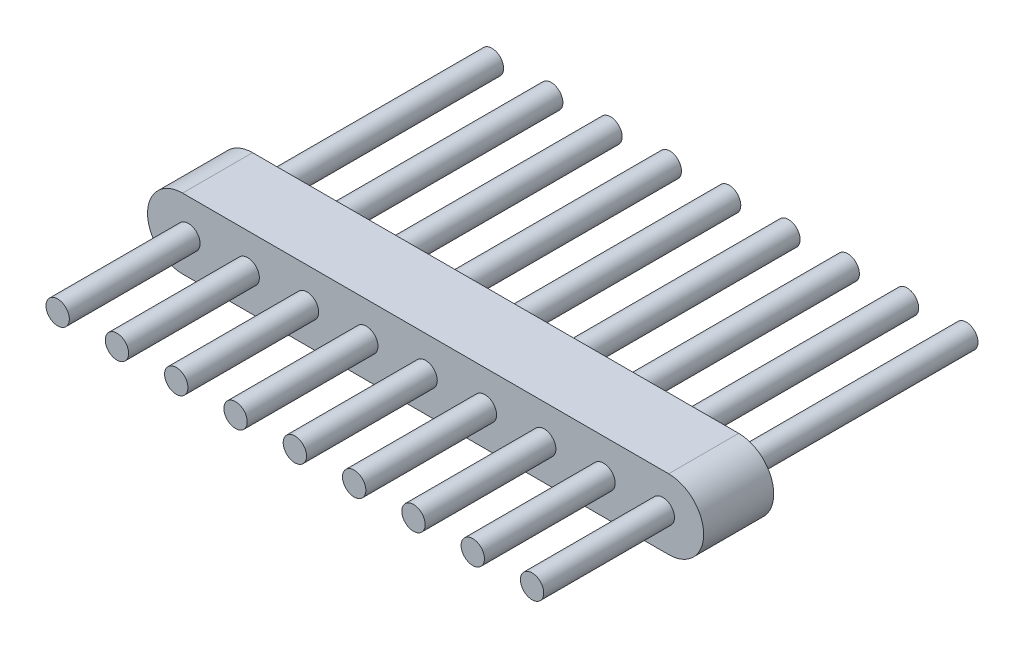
SolidWorks part; units mm, degrees
ref_plane "前视" through (0, 0, 0) normal (0, 0, 1) x (1, 0, 0)
ref_plane "上视" through (0, 0, 0) normal (0, 1, 0) x (1, 0, 0)
ref_plane "右视" through (0, 0, 0) normal (1, 0, 0) x (0, 0, -1)
sketch "草图1" plane through (0, 0, 0) normal (0, 0, 1) x (1, 0, 0)
  line L44 (125.1289, 131.467) -> (125.1289, 129.967)
  line L45 (137.0389, 129.967) -> (137.0389, 131.467)
  line L46 (132.1039, 129.967) -> (132.1039, 124.967)
  line L47 (132.6039, 124.967) -> (132.6039, 129.967)
  line L48 (130.8339, 129.967) -> (130.8339, 124.967)
  line L49 (131.3339, 124.967) -> (131.3339, 129.967)
  line L50 (129.5639, 129.967) -> (129.5639, 124.967)
  line L51 (130.0639, 124.967) -> (130.0639, 129.967)
  line L52 (127.0239, 129.967) -> (127.0239, 124.967)
  line L53 (127.5239, 124.967) -> (127.5239, 129.967)
  line L54 (125.7539, 129.967) -> (125.7539, 124.967)
  line L55 (126.2539, 124.967) -> (126.2539, 129.967)
  line L56 (128.2939, 129.967) -> (128.2939, 124.967)
  line L57 (128.7939, 124.967) -> (128.7939, 129.967)
  line L58 (135.9139, 129.967) -> (135.9139, 124.967)
  line L59 (136.4139, 124.967) -> (136.4139, 129.967)
  line L60 (133.3739, 129.967) -> (133.3739, 124.967)
  line L61 (133.8739, 124.967) -> (133.8739, 129.967)
  line L62 (134.6439, 129.967) -> (134.6439, 124.967)
  line L63 (135.1439, 124.967) -> (135.1439, 129.967)
  line L64 (131.3339, 131.467) -> (131.3339, 134.267)
  line L65 (130.8339, 134.267) -> (130.8339, 131.467)
  line L66 (136.4139, 131.467) -> (136.4139, 134.267)
  line L67 (135.9139, 134.267) -> (135.9139, 131.467)
  line L68 (135.1439, 131.467) -> (135.1439, 134.267)
  line L69 (134.6439, 134.267) -> (134.6439, 131.467)
  line L70 (133.8739, 131.467) -> (133.8739, 134.267)
  line L71 (133.3739, 134.267) -> (133.3739, 131.467)
  line L72 (132.6039, 131.467) -> (132.6039, 134.267)
  line L73 (132.1039, 134.267) -> (132.1039, 131.467)
  line L74 (130.0639, 131.467) -> (130.0639, 134.267)
  line L75 (129.5639, 134.267) -> (129.5639, 131.467)
  line L76 (128.7939, 131.467) -> (128.7939, 134.267)
  line L77 (128.2939, 134.267) -> (128.2939, 131.467)
  line L78 (127.5239, 131.467) -> (127.5239, 134.267)
  line L79 (127.0239, 134.267) -> (127.0239, 131.467)
  line L80 (126.2539, 131.467) -> (126.2539, 134.267)
  line L81 (125.7539, 134.267) -> (125.7539, 131.467)
  line L82 (125.8789, 129.967) -> (125.8789, 131.467)
  line L83 (125.8789, 129.967) -> (125.1289, 129.967)
  line L84 (125.8789, 131.467) -> (125.1289, 131.467)
  line L85 (136.2889, 129.967) -> (136.2889, 131.467)
  line L86 (136.2889, 129.967) -> (125.8789, 129.967)
  line L87 (136.2889, 131.467) -> (125.8789, 131.467)
  line L88 (137.0389, 129.967) -> (136.2889, 129.967)
  line L89 (137.0389, 131.467) -> (136.2889, 131.467)
  line L90 (132.6039, 124.967) -> (132.1039, 124.967)
  line L91 (131.3339, 124.967) -> (130.8339, 124.967)
  line L92 (130.0639, 124.967) -> (129.5639, 124.967)
  line L93 (127.5239, 124.967) -> (127.0239, 124.967)
  line L94 (126.2539, 124.967) -> (125.7539, 124.967)
  line L95 (128.7939, 124.967) -> (128.2939, 124.967)
  line L96 (136.4139, 124.967) -> (135.9139, 124.967)
  line L97 (133.8739, 124.967) -> (133.3739, 124.967)
  line L98 (135.1439, 124.967) -> (134.6439, 124.967)
  line L99 (130.8339, 134.267) -> (131.3339, 134.267)
  line L100 (135.9139, 134.267) -> (136.4139, 134.267)
  line L101 (134.6439, 134.267) -> (135.1439, 134.267)
  line L102 (133.3739, 134.267) -> (133.8739, 134.267)
  line L103 (132.1039, 134.267) -> (132.6039, 134.267)
  line L104 (129.5639, 134.267) -> (130.0639, 134.267)
  line L105 (128.2939, 134.267) -> (128.7939, 134.267)
  line L106 (127.0239, 134.267) -> (127.5239, 134.267)
  line L107 (125.7539, 134.267) -> (126.2539, 134.267)
  line L108 (125.8789, 142.3005) -> (136.2889, 142.3005)
  line L109 (136.2889, 143.8005) -> (125.8789, 143.8005)
  line L110 (126.0039, 143.0505) -> (126.0039, 145.5505)
  line L111 (126.0039, 143.0505) -> (123.5039, 143.0505)
  line L112 (126.0039, 143.0505) -> (126.0039, 140.5505)
  line L113 (126.0039, 143.0505) -> (128.5039, 143.0505)
  line L114 (126.0039, 145.5505) -> (126.0039, 145.8005)
  line L115 (123.5039, 143.0505) -> (123.2539, 143.0505)
  line L116 (126.0039, 140.5505) -> (126.0039, 140.3005)
  line L117 (128.5039, 143.0505) -> (128.7539, 143.0505)
  line L118 (127.2739, 143.0505) -> (127.2739, 145.5505)
  line L119 (127.2739, 143.0505) -> (124.7739, 143.0505)
  line L120 (127.2739, 143.0505) -> (127.2739, 140.5505)
  line L121 (127.2739, 143.0505) -> (129.7739, 143.0505)
  line L122 (127.2739, 145.5505) -> (127.2739, 145.8005)
  line L123 (124.7739, 143.0505) -> (124.5239, 143.0505)
  line L124 (127.2739, 140.5505) -> (127.2739, 140.3005)
  line L125 (129.7739, 143.0505) -> (130.0239, 143.0505)
  line L126 (128.5439, 143.0505) -> (128.5439, 145.5505)
  line L127 (128.5439, 143.0505) -> (126.0439, 143.0505)
  line L128 (128.5439, 143.0505) -> (128.5439, 140.5505)
  line L129 (128.5439, 143.0505) -> (131.0439, 143.0505)
  line L130 (128.5439, 145.5505) -> (128.5439, 145.8005)
  line L131 (126.0439, 143.0505) -> (125.7939, 143.0505)
  line L132 (128.5439, 140.5505) -> (128.5439, 140.3005)
  line L133 (131.0439, 143.0505) -> (131.2939, 143.0505)
  line L134 (129.8139, 143.0505) -> (129.8139, 145.5505)
  line L135 (129.8139, 143.0505) -> (127.3139, 143.0505)
  line L136 (129.8139, 143.0505) -> (129.8139, 140.5505)
  line L137 (129.8139, 143.0505) -> (132.3139, 143.0505)
  line L138 (129.8139, 145.5505) -> (129.8139, 145.8005)
  line L139 (127.3139, 143.0505) -> (127.0639, 143.0505)
  line L140 (129.8139, 140.5505) -> (129.8139, 140.3005)
  line L141 (132.3139, 143.0505) -> (132.5639, 143.0505)
  line L142 (131.0839, 143.0505) -> (131.0839, 145.5505)
  line L143 (131.0839, 143.0505) -> (128.5839, 143.0505)
  line L144 (131.0839, 143.0505) -> (131.0839, 140.5505)
  line L145 (131.0839, 143.0505) -> (133.5839, 143.0505)
  line L146 (131.0839, 145.5505) -> (131.0839, 145.8005)
  line L147 (128.5839, 143.0505) -> (128.3339, 143.0505)
  line L148 (131.0839, 140.5505) -> (131.0839, 140.3005)
  line L149 (133.5839, 143.0505) -> (133.8339, 143.0505)
  line L150 (132.3539, 143.0505) -> (132.3539, 145.5505)
  line L151 (132.3539, 143.0505) -> (129.8539, 143.0505)
  line L152 (132.3539, 143.0505) -> (132.3539, 140.5505)
  line L153 (132.3539, 143.0505) -> (134.8539, 143.0505)
  line L154 (132.3539, 145.5505) -> (132.3539, 145.8005)
  line L155 (129.8539, 143.0505) -> (129.6039, 143.0505)
  line L156 (132.3539, 140.5505) -> (132.3539, 140.3005)
  line L157 (134.8539, 143.0505) -> (135.1039, 143.0505)
  line L158 (133.6239, 143.0505) -> (133.6239, 145.5505)
  line L159 (133.6239, 143.0505) -> (131.1239, 143.0505)
  line L160 (133.6239, 143.0505) -> (133.6239, 140.5505)
  line L161 (133.6239, 143.0505) -> (136.1239, 143.0505)
  line L162 (133.6239, 145.5505) -> (133.6239, 145.8005)
  line L163 (131.1239, 143.0505) -> (130.8739, 143.0505)
  line L164 (133.6239, 140.5505) -> (133.6239, 140.3005)
  line L165 (136.1239, 143.0505) -> (136.3739, 143.0505)
  line L166 (134.8939, 143.0505) -> (134.8939, 145.5505)
  line L167 (134.8939, 143.0505) -> (132.3939, 143.0505)
  line L168 (134.8939, 143.0505) -> (134.8939, 140.5505)
  line L169 (134.8939, 143.0505) -> (137.3939, 143.0505)
  line L170 (134.8939, 145.5505) -> (134.8939, 145.8005)
  line L171 (132.3939, 143.0505) -> (132.1439, 143.0505)
  line L172 (134.8939, 140.5505) -> (134.8939, 140.3005)
  line L173 (137.3939, 143.0505) -> (137.6439, 143.0505)
  line L174 (136.1639, 143.0505) -> (136.1639, 145.5505)
  line L175 (136.1639, 143.0505) -> (133.6639, 143.0505)
  line L176 (136.1639, 143.0505) -> (136.1639, 140.5505)
  line L177 (136.1639, 143.0505) -> (138.6639, 143.0505)
  line L178 (136.1639, 145.5505) -> (136.1639, 145.8005)
  line L179 (133.6639, 143.0505) -> (133.4139, 143.0505)
  line L180 (136.1639, 140.5505) -> (136.1639, 140.3005)
  line L181 (138.6639, 143.0505) -> (138.9139, 143.0505)
  line L182 (136.2889, 116.4569) -> (125.8789, 116.4569)
  line L183 (125.8789, 117.9569) -> (136.2889, 117.9569)
  line L184 (126.0039, 117.2069) -> (126.0039, 119.7069)
  line L185 (126.0039, 117.2069) -> (123.5039, 117.2069)
  line L186 (126.0039, 117.2069) -> (126.0039, 114.7069)
  line L187 (126.0039, 117.2069) -> (128.5039, 117.2069)
  line L188 (126.0039, 119.7069) -> (126.0039, 119.9569)
  line L189 (123.5039, 117.2069) -> (123.2539, 117.2069)
  line L190 (126.0039, 114.7069) -> (126.0039, 114.4569)
  line L191 (128.5039, 117.2069) -> (128.7539, 117.2069)
  line L192 (127.2739, 117.2069) -> (127.2739, 119.7069)
  line L193 (127.2739, 117.2069) -> (124.7739, 117.2069)
  line L194 (127.2739, 117.2069) -> (127.2739, 114.7069)
  line L195 (127.2739, 117.2069) -> (129.7739, 117.2069)
  line L196 (127.2739, 119.7069) -> (127.2739, 119.9569)
  line L197 (124.7739, 117.2069) -> (124.5239, 117.2069)
  line L198 (127.2739, 114.7069) -> (127.2739, 114.4569)
  line L199 (129.7739, 117.2069) -> (130.0239, 117.2069)
  line L200 (128.5439, 117.2069) -> (128.5439, 119.7069)
  line L201 (128.5439, 117.2069) -> (126.0439, 117.2069)
  line L202 (128.5439, 117.2069) -> (128.5439, 114.7069)
  line L203 (128.5439, 117.2069) -> (131.0439, 117.2069)
  line L204 (128.5439, 119.7069) -> (128.5439, 119.9569)
  line L205 (126.0439, 117.2069) -> (125.7939, 117.2069)
  line L206 (128.5439, 114.7069) -> (128.5439, 114.4569)
  line L207 (131.0439, 117.2069) -> (131.2939, 117.2069)
  line L208 (129.8139, 117.2069) -> (129.8139, 119.7069)
  line L209 (129.8139, 117.2069) -> (127.3139, 117.2069)
  line L210 (129.8139, 117.2069) -> (129.8139, 114.7069)
  line L211 (129.8139, 117.2069) -> (132.3139, 117.2069)
  line L212 (129.8139, 119.7069) -> (129.8139, 119.9569)
  line L213 (127.3139, 117.2069) -> (127.0639, 117.2069)
  line L214 (129.8139, 114.7069) -> (129.8139, 114.4569)
  line L215 (132.3139, 117.2069) -> (132.5639, 117.2069)
  line L216 (131.0839, 117.2069) -> (131.0839, 119.7069)
  line L217 (131.0839, 117.2069) -> (128.5839, 117.2069)
  line L218 (131.0839, 117.2069) -> (131.0839, 114.7069)
  line L219 (131.0839, 117.2069) -> (133.5839, 117.2069)
  line L220 (131.0839, 119.7069) -> (131.0839, 119.9569)
  line L221 (128.5839, 117.2069) -> (128.3339, 117.2069)
  line L222 (131.0839, 114.7069) -> (131.0839, 114.4569)
  line L223 (133.5839, 117.2069) -> (133.8339, 117.2069)
  line L224 (132.3539, 117.2069) -> (132.3539, 119.7069)
  line L225 (132.3539, 117.2069) -> (129.8539, 117.2069)
  line L226 (132.3539, 117.2069) -> (132.3539, 114.7069)
  line L227 (132.3539, 117.2069) -> (134.8539, 117.2069)
  line L228 (132.3539, 119.7069) -> (132.3539, 119.9569)
  line L229 (129.8539, 117.2069) -> (129.6039, 117.2069)
  line L230 (132.3539, 114.7069) -> (132.3539, 114.4569)
  line L231 (134.8539, 117.2069) -> (135.1039, 117.2069)
  line L232 (133.6239, 117.2069) -> (133.6239, 119.7069)
  line L233 (133.6239, 117.2069) -> (131.1239, 117.2069)
  line L234 (133.6239, 117.2069) -> (133.6239, 114.7069)
  line L235 (133.6239, 117.2069) -> (136.1239, 117.2069)
  line L236 (133.6239, 119.7069) -> (133.6239, 119.9569)
  line L237 (131.1239, 117.2069) -> (130.8739, 117.2069)
  line L238 (133.6239, 114.7069) -> (133.6239, 114.4569)
  line L239 (136.1239, 117.2069) -> (136.3739, 117.2069)
  line L240 (134.8939, 117.2069) -> (134.8939, 119.7069)
  line L241 (134.8939, 117.2069) -> (132.3939, 117.2069)
  line L242 (134.8939, 117.2069) -> (134.8939, 114.7069)
  line L243 (134.8939, 117.2069) -> (137.3939, 117.2069)
  line L244 (134.8939, 119.7069) -> (134.8939, 119.9569)
  line L245 (132.3939, 117.2069) -> (132.1439, 117.2069)
  line L246 (134.8939, 114.7069) -> (134.8939, 114.4569)
  line L247 (137.3939, 117.2069) -> (137.6439, 117.2069)
  line L248 (136.1639, 117.2069) -> (136.1639, 119.7069)
  line L249 (136.1639, 117.2069) -> (133.6639, 117.2069)
  line L250 (136.1639, 117.2069) -> (136.1639, 114.7069)
  line L251 (136.1639, 117.2069) -> (138.6639, 117.2069)
  line L252 (136.1639, 119.7069) -> (136.1639, 119.9569)
  line L253 (133.6639, 117.2069) -> (133.4139, 117.2069)
  line L254 (136.1639, 114.7069) -> (136.1639, 114.4569)
  line L255 (138.6639, 117.2069) -> (138.9139, 117.2069)
  line L256 (110.631, 129.967) -> (110.631, 124.967)
  line L257 (111.131, 124.967) -> (111.131, 129.967)
  line L258 (111.131, 131.467) -> (111.131, 134.267)
  line L259 (110.631, 134.267) -> (110.631, 131.467)
  line L260 (111.631, 129.967) -> (111.631, 131.467)
  line L261 (111.631, 129.967) -> (110.131, 129.967)
  line L262 (110.131, 129.967) -> (110.131, 131.467)
  line L263 (111.631, 131.467) -> (110.131, 131.467)
  line L264 (110.881, 124.967) -> (110.631, 124.967)
  line L265 (111.131, 124.967) -> (110.881, 124.967)
  line L266 (110.631, 134.267) -> (111.131, 134.267)
  line L267 (147.3726, 129.967) -> (147.3726, 124.967)
  line L268 (147.8726, 124.967) -> (147.8726, 129.967)
  line L269 (147.8726, 131.467) -> (147.8726, 134.267)
  line L270 (147.3726, 134.267) -> (147.3726, 131.467)
  line L271 (148.3726, 129.967) -> (148.3726, 131.467)
  line L272 (148.3726, 129.967) -> (146.8726, 129.967)
  line L273 (146.8726, 129.967) -> (146.8726, 131.467)
  line L274 (148.3726, 131.467) -> (146.8726, 131.467)
  line L275 (147.8726, 124.967) -> (147.3726, 124.967)
  line L276 (147.6226, 134.267) -> (147.8726, 134.267)
  line L277 (147.3726, 134.267) -> (147.6226, 134.267)
  line L278 (157.7482, 151.8762) -> (157.7482, 154.1625)
  line L279 (157.2482, 154.1625) -> (157.2482, 151.8762)
  line L280 (156.8502, 152.3946) -> (156.8502, 154.6809)
  line L281 (156.3502, 154.6809) -> (156.3502, 152.3946)
  line L282 (158.3366, 150.6003) -> (158.3366, 151.8251)
  line L283 (155.9521, 152.913) -> (155.9521, 155.1993)
  line L284 (155.4521, 155.1993) -> (155.4521, 152.913)
  line L285 (155.0541, 153.4314) -> (155.0541, 155.7177)
  line L286 (154.5541, 155.7177) -> (154.5541, 153.4314)
  line L287 (157.2482, 150.2139) -> (157.2482, 146.5686)
  line L288 (157.7482, 146.5686) -> (157.7482, 150.1775)
  line L289 (154.1561, 153.9498) -> (154.1561, 156.2362)
  line L290 (153.6561, 156.2362) -> (153.6561, 153.9498)
  line L291 (156.3502, 150.7018) -> (156.3502, 147.0871)
  line L292 (156.8502, 147.0871) -> (156.8502, 150.4131)
  line L293 (153.2581, 154.4683) -> (153.2581, 156.7546)
  line L294 (152.7581, 156.7546) -> (152.7581, 154.4683)
  line L295 (155.4521, 151.2202) -> (155.4521, 147.6055)
  line L296 (155.9521, 147.6055) -> (155.9521, 150.9316)
  line L297 (152.36, 154.9867) -> (152.36, 157.273)
  line L298 (151.86, 157.273) -> (151.86, 154.9867)
  line L299 (154.5541, 151.7386) -> (154.5541, 148.1239)
  line L300 (155.0541, 148.1239) -> (155.0541, 151.45)
  line L301 (151.462, 155.5051) -> (151.462, 157.7914)
  line L302 (150.962, 157.7914) -> (150.962, 155.5051)
  line L303 (153.6561, 152.257) -> (153.6561, 148.6423)
  line L304 (154.1561, 148.6423) -> (154.1561, 151.9684)
  line L305 (150.564, 156.0235) -> (150.564, 158.3098)
  line L306 (150.064, 158.3098) -> (150.064, 156.0235)
  line L307 (152.7581, 152.7755) -> (152.7581, 149.1607)
  line L308 (153.2581, 149.1607) -> (153.2581, 152.4868)
  line L309 (151.86, 153.2939) -> (151.86, 149.6792)
  line L310 (152.36, 149.6792) -> (152.36, 153.0052)
  line L311 (149.4756, 156.0745) -> (149.4756, 154.8497)
  line L312 (150.962, 153.8123) -> (150.962, 150.1976)
  line L313 (151.462, 150.1976) -> (151.462, 153.5237)
  line L314 (150.064, 154.3307) -> (150.064, 150.716)
  line L315 (150.564, 150.716) -> (150.564, 154.0421)
  line L316 (157.3214, 154.2645) -> (157.283, 154.2359)
  line L317 (157.283, 154.2359) -> (157.2581, 154.2027)
  line L318 (157.2581, 154.2027) -> (157.2483, 154.167)
  line L319 (157.2483, 154.167) -> (157.2542, 154.131)
  line L320 (157.2542, 154.131) -> (157.2754, 154.097)
  line L321 (157.2754, 154.097) -> (157.3107, 154.067)
  line L322 (157.3107, 154.067) -> (157.3577, 154.0431)
  line L323 (157.3577, 154.0431) -> (157.4135, 154.0267)
  line L324 (157.4135, 154.0267) -> (157.4747, 154.0188)
  line L325 (157.4747, 154.0188) -> (157.5373, 154.0199)
  line L326 (157.5373, 154.0199) -> (157.5975, 154.03)
  line L327 (157.5975, 154.03) -> (157.6514, 154.0484)
  line L328 (157.6514, 154.0484) -> (157.6957, 154.074)
  line L329 (157.6957, 154.074) -> (157.7276, 154.1052)
  line L330 (157.7276, 154.1052) -> (157.7451, 154.1399)
  line L331 (157.7451, 154.1399) -> (157.7471, 154.1761)
  line L332 (157.7471, 154.1761) -> (157.7334, 154.2114)
  line L333 (157.7334, 154.2114) -> (157.705, 154.2436)
  line L334 (157.705, 154.2436) -> (157.6635, 154.2707)
  line L335 (157.6635, 154.2707) -> (157.6117, 154.2911)
  line L336 (157.6117, 154.2911) -> (157.5527, 154.3033)
  line L337 (157.5527, 154.3033) -> (157.4903, 154.3067)
  line L338 (157.4903, 154.3067) -> (157.4285, 154.3011)
  line L339 (157.4285, 154.3011) -> (157.3709, 154.2867)
  line L340 (157.3709, 154.2867) -> (157.3214, 154.2645)
  line L341 (157.2482, 151.8762) -> (157.2493, 151.8626)
  line L342 (157.2493, 151.8626) -> (157.263, 151.8273)
  line L343 (157.263, 151.8273) -> (157.2914, 151.795)
  line L344 (157.2914, 151.795) -> (157.3329, 151.7679)
  line L345 (157.3329, 151.7679) -> (157.3847, 151.7476)
  line L346 (157.3847, 151.7476) -> (157.4437, 151.7353)
  line L347 (157.4437, 151.7353) -> (157.5061, 151.7319)
  line L348 (157.5061, 151.7319) -> (157.5679, 151.7376)
  line L349 (157.5679, 151.7376) -> (157.6255, 151.7519)
  line L350 (157.6255, 151.7519) -> (157.675, 151.7741)
  line L351 (156.3502, 152.3946) -> (156.3513, 152.381)
  line L352 (156.3513, 152.381) -> (156.365, 152.3457)
  line L353 (156.365, 152.3457) -> (156.3934, 152.3135)
  line L354 (156.3934, 152.3135) -> (156.4348, 152.2863)
  line L355 (156.4348, 152.2863) -> (156.4867, 152.266)
  line L356 (156.4867, 152.266) -> (156.5456, 152.2537)
  line L357 (156.5456, 152.2537) -> (156.608, 152.2503)
  line L358 (156.608, 152.2503) -> (156.6699, 152.256)
  line L359 (156.6699, 152.256) -> (156.7274, 152.2704)
  line L360 (156.7274, 152.2704) -> (156.777, 152.2925)
  line L361 (156.4234, 154.7829) -> (156.385, 154.7544)
  line L362 (156.385, 154.7544) -> (156.3601, 154.7212)
  line L363 (156.3601, 154.7212) -> (156.3503, 154.6854)
  line L364 (156.3503, 154.6854) -> (156.3562, 154.6494)
  line L365 (156.3562, 154.6494) -> (156.3774, 154.6154)
  line L366 (156.3774, 154.6154) -> (156.4126, 154.5855)
  line L367 (156.4126, 154.5855) -> (156.4597, 154.5615)
  line L368 (156.4597, 154.5615) -> (156.5155, 154.5451)
  line L369 (156.5155, 154.5451) -> (156.5766, 154.5372)
  line L370 (156.5766, 154.5372) -> (156.6393, 154.5384)
  line L371 (156.6393, 154.5384) -> (156.6995, 154.5484)
  line L372 (156.6995, 154.5484) -> (156.7534, 154.5669)
  line L373 (156.7534, 154.5669) -> (156.7977, 154.5924)
  line L374 (156.7977, 154.5924) -> (156.8296, 154.6236)
  line L375 (156.8296, 154.6236) -> (156.8471, 154.6583)
  line L376 (156.8471, 154.6583) -> (156.8491, 154.6945)
  line L377 (156.8491, 154.6945) -> (156.8354, 154.7298)
  line L378 (156.8354, 154.7298) -> (156.8069, 154.762)
  line L379 (156.8069, 154.762) -> (156.7655, 154.7892)
  line L380 (156.7655, 154.7892) -> (156.7137, 154.8095)
  line L381 (156.7137, 154.8095) -> (156.6547, 154.8217)
  line L382 (156.6547, 154.8217) -> (156.5923, 154.8251)
  line L383 (156.5923, 154.8251) -> (156.5304, 154.8195)
  line L384 (156.5304, 154.8195) -> (156.4729, 154.8051)
  line L385 (156.4729, 154.8051) -> (156.4234, 154.7829)
  line L386 (158.3366, 150.6003) -> (158.3347, 150.5694)
  line L387 (158.3347, 150.5694) -> (158.3194, 150.5083)
  line L388 (158.3194, 150.5083) -> (158.2893, 150.449)
  line L389 (158.2893, 150.449) -> (158.2448, 150.3928)
  line L390 (158.2448, 150.3928) -> (158.187, 150.3409)
  line L391 (158.187, 150.3409) -> (158.1169, 150.2942)
  line L392 (158.1169, 150.2942) -> (158.036, 150.2537)
  line L393 (158.036, 150.2537) -> (157.946, 150.2203)
  line L394 (157.946, 150.2203) -> (157.8487, 150.1947)
  line L395 (157.8487, 150.1947) -> (157.746, 150.1773)
  line L396 (157.746, 150.1773) -> (157.6401, 150.1685)
  line L397 (157.6401, 150.1685) -> (157.5331, 150.1685)
  line L398 (157.5331, 150.1685) -> (157.4272, 150.1773)
  line L399 (157.4272, 150.1773) -> (157.3245, 150.1947)
  line L400 (157.3245, 150.1947) -> (157.2272, 150.2203)
  line L401 (157.2272, 150.2203) -> (157.1371, 150.2537)
  line L402 (157.1371, 150.2537) -> (157.0563, 150.2942)
  line L403 (157.0563, 150.2942) -> (157.0563, 151.519)
  line L404 (158.1169, 152.1313) -> (158.187, 152.0846)
  line L405 (158.187, 152.0846) -> (158.2448, 152.0326)
  line L406 (158.2448, 152.0326) -> (158.2893, 151.9764)
  line L407 (158.2893, 151.9764) -> (158.3194, 151.9172)
  line L408 (158.3194, 151.9172) -> (158.3347, 151.856)
  line L409 (158.3347, 151.856) -> (158.3347, 151.7943)
  line L410 (158.3347, 151.7943) -> (158.3194, 151.7331)
  line L411 (158.3194, 151.7331) -> (158.2893, 151.6738)
  line L412 (158.2893, 151.6738) -> (158.2448, 151.6176)
  line L413 (158.2448, 151.6176) -> (158.187, 151.5657)
  line L414 (158.187, 151.5657) -> (158.1169, 151.519)
  line L415 (158.1169, 151.519) -> (158.036, 151.4785)
  line L416 (158.036, 151.4785) -> (157.946, 151.4451)
  line L417 (157.946, 151.4451) -> (157.8487, 151.4195)
  line L418 (157.8487, 151.4195) -> (157.746, 151.4021)
  line L419 (157.746, 151.4021) -> (157.6401, 151.3933)
  line L420 (157.6401, 151.3933) -> (157.5331, 151.3933)
  line L421 (157.5331, 151.3933) -> (157.4272, 151.4021)
  line L422 (157.4272, 151.4021) -> (157.3245, 151.4195)
  line L423 (157.3245, 151.4195) -> (157.2272, 151.4451)
  line L424 (157.2272, 151.4451) -> (157.1371, 151.4785)
  line L425 (157.1371, 151.4785) -> (157.0563, 151.519)
  line L426 (150.7559, 156.3807) -> (150.962, 156.2617)
  line L427 (151.462, 155.9731) -> (151.86, 155.7433)
  line L428 (152.36, 155.4547) -> (152.7581, 155.2249)
  line L429 (153.2581, 154.9362) -> (153.6561, 154.7065)
  line L430 (154.1561, 154.4178) -> (154.5541, 154.188)
  line L431 (155.0541, 153.8994) -> (155.4521, 153.6696)
  line L432 (155.9521, 153.381) -> (156.3502, 153.1512)
  line L433 (156.8502, 152.8626) -> (157.2482, 152.6328)
  line L434 (157.7482, 152.3441) -> (158.1169, 152.1313)
  line L435 (157.0563, 151.519) -> (149.6953, 155.7684)
  line L436 (149.6953, 155.7684) -> (149.6252, 155.8151)
  line L437 (149.6252, 155.8151) -> (149.5673, 155.867)
  line L438 (149.5673, 155.867) -> (149.5229, 155.9232)
  line L439 (149.5229, 155.9232) -> (149.4927, 155.9825)
  line L440 (149.4927, 155.9825) -> (149.4775, 156.0437)
  line L441 (149.4775, 156.0437) -> (149.4775, 156.1054)
  line L442 (149.4775, 156.1054) -> (149.4927, 156.1666)
  line L443 (149.4927, 156.1666) -> (149.5229, 156.2258)
  line L444 (149.5229, 156.2258) -> (149.5673, 156.282)
  line L445 (149.5673, 156.282) -> (149.6252, 156.334)
  line L446 (149.6252, 156.334) -> (149.6953, 156.3807)
  line L447 (149.6953, 156.3807) -> (149.7761, 156.4211)
  line L448 (149.7761, 156.4211) -> (149.8662, 156.4545)
  line L449 (149.8662, 156.4545) -> (149.9635, 156.4802)
  line L450 (149.9635, 156.4802) -> (150.064, 156.4973)
  line L451 (155.4521, 152.913) -> (155.4533, 152.8994)
  line L452 (155.4533, 152.8994) -> (155.4669, 152.8641)
  line L453 (155.4669, 152.8641) -> (155.4954, 152.8319)
  line L454 (155.4954, 152.8319) -> (155.5368, 152.8047)
  line L455 (155.5368, 152.8047) -> (155.5887, 152.7844)
  line L456 (155.5887, 152.7844) -> (155.6476, 152.7722)
  line L457 (155.6476, 152.7722) -> (155.71, 152.7688)
  line L458 (155.71, 152.7688) -> (155.7719, 152.7744)
  line L459 (155.7719, 152.7744) -> (155.8294, 152.7888)
  line L460 (155.8294, 152.7888) -> (155.8789, 152.811)
  line L461 (154.5541, 153.4314) -> (154.5552, 153.4178)
  line L462 (154.5552, 153.4178) -> (154.5689, 153.3825)
  line L463 (154.5689, 153.3825) -> (154.5974, 153.3503)
  line L464 (154.5974, 153.3503) -> (154.6388, 153.3232)
  line L465 (154.6388, 153.3232) -> (154.6906, 153.3028)
  line L466 (154.6906, 153.3028) -> (154.7496, 153.2906)
  line L467 (154.7496, 153.2906) -> (154.812, 153.2872)
  line L468 (154.812, 153.2872) -> (154.8739, 153.2928)
  line L469 (154.8739, 153.2928) -> (154.9314, 153.3072)
  line L470 (154.9314, 153.3072) -> (154.9809, 153.3294)
  line L471 (153.6561, 153.9498) -> (153.6572, 153.9363)
  line L472 (153.6572, 153.9363) -> (153.6709, 153.901)
  line L473 (153.6709, 153.901) -> (153.6993, 153.8687)
  line L474 (153.6993, 153.8687) -> (153.7408, 153.8416)
  line L475 (153.7408, 153.8416) -> (153.7926, 153.8212)
  line L476 (153.7926, 153.8212) -> (153.8516, 153.809)
  line L477 (153.8516, 153.809) -> (153.9139, 153.8056)
  line L478 (153.9139, 153.8056) -> (153.9758, 153.8112)
  line L479 (153.9758, 153.8112) -> (154.0334, 153.8256)
  line L480 (154.0334, 153.8256) -> (154.0829, 153.8478)
  line L481 (152.7581, 154.4683) -> (152.7592, 154.4547)
  line L482 (152.7592, 154.4547) -> (152.7729, 154.4194)
  line L483 (152.7729, 154.4194) -> (152.8013, 154.3871)
  line L484 (152.8013, 154.3871) -> (152.8427, 154.36)
  line L485 (152.8427, 154.36) -> (152.8946, 154.3397)
  line L486 (152.8946, 154.3397) -> (152.9535, 154.3274)
  line L487 (152.9535, 154.3274) -> (153.0159, 154.324)
  line L488 (153.0159, 154.324) -> (153.0778, 154.3297)
  line L489 (153.0778, 154.3297) -> (153.1353, 154.344)
  line L490 (153.1353, 154.344) -> (153.1848, 154.3662)
  line L491 (151.86, 154.9867) -> (151.8612, 154.9731)
  line L492 (151.8612, 154.9731) -> (151.8748, 154.9378)
  line L493 (151.8748, 154.9378) -> (151.9033, 154.9056)
  line L494 (151.9033, 154.9056) -> (151.9447, 154.8784)
  line L495 (151.9447, 154.8784) -> (151.9965, 154.8581)
  line L496 (151.9965, 154.8581) -> (152.0555, 154.8458)
  line L497 (152.0555, 154.8458) -> (152.1179, 154.8424)
  line L498 (152.1179, 154.8424) -> (152.1798, 154.8481)
  line L499 (152.1798, 154.8481) -> (152.2373, 154.8625)
  line L500 (152.2373, 154.8625) -> (152.2868, 154.8846)
  line L501 (150.962, 155.5051) -> (150.9631, 155.4915)
  line L502 (150.9631, 155.4915) -> (150.9768, 155.4562)
  line L503 (150.9768, 155.4562) -> (151.0053, 155.424)
  line L504 (151.0053, 155.424) -> (151.0467, 155.3968)
  line L505 (151.0467, 155.3968) -> (151.0985, 155.3765)
  line L506 (151.0985, 155.3765) -> (151.1575, 155.3643)
  line L507 (151.1575, 155.3643) -> (151.2199, 155.3608)
  line L508 (151.2199, 155.3608) -> (151.2818, 155.3665)
  line L509 (151.2818, 155.3665) -> (151.3393, 155.3809)
  line L510 (151.3393, 155.3809) -> (151.3888, 155.403)
  line L511 (150.064, 156.0235) -> (150.0651, 156.0099)
  line L512 (150.0651, 156.0099) -> (150.0788, 155.9746)
  line L513 (150.0788, 155.9746) -> (150.1072, 155.9424)
  line L514 (150.1072, 155.9424) -> (150.1487, 155.9153)
  line L515 (150.1487, 155.9153) -> (150.2005, 155.8949)
  line L516 (150.2005, 155.8949) -> (150.2595, 155.8827)
  line L517 (150.2595, 155.8827) -> (150.3218, 155.8793)
  line L518 (150.3218, 155.8793) -> (150.3837, 155.8849)
  line L519 (150.3837, 155.8849) -> (150.4413, 155.8993)
  line L520 (150.4413, 155.8993) -> (150.4908, 155.9215)
  line L521 (157.0563, 150.2942) -> (149.6953, 154.5436)
  line L522 (149.6953, 154.5436) -> (149.6953, 155.7684)
  line L523 (155.5254, 155.3014) -> (155.487, 155.2728)
  line L524 (155.487, 155.2728) -> (155.4621, 155.2396)
  line L525 (155.4621, 155.2396) -> (155.4523, 155.2038)
  line L526 (155.4523, 155.2038) -> (155.4582, 155.1678)
  line L527 (155.4582, 155.1678) -> (155.4794, 155.1338)
  line L528 (155.4794, 155.1338) -> (155.5146, 155.1039)
  line L529 (155.5146, 155.1039) -> (155.5616, 155.08)
  line L530 (155.5616, 155.08) -> (155.6175, 155.0635)
  line L531 (155.6175, 155.0635) -> (155.6786, 155.0556)
  line L532 (155.6786, 155.0556) -> (155.7413, 155.0568)
  line L533 (155.7413, 155.0568) -> (155.8014, 155.0669)
  line L534 (155.8014, 155.0669) -> (155.8554, 155.0853)
  line L535 (155.8554, 155.0853) -> (155.8997, 155.1109)
  line L536 (155.8997, 155.1109) -> (155.9316, 155.142)
  line L537 (155.9316, 155.142) -> (155.9491, 155.1767)
  line L538 (155.9491, 155.1767) -> (155.951, 155.2129)
  line L539 (155.951, 155.2129) -> (155.9374, 155.2482)
  line L540 (155.9374, 155.2482) -> (155.9089, 155.2804)
  line L541 (155.9089, 155.2804) -> (155.8675, 155.3076)
  line L542 (155.8675, 155.3076) -> (155.8156, 155.3279)
  line L543 (155.8156, 155.3279) -> (155.7567, 155.3402)
  line L544 (155.7567, 155.3402) -> (155.6943, 155.3436)
  line L545 (155.6943, 155.3436) -> (155.6324, 155.3379)
  line L546 (155.6324, 155.3379) -> (155.5749, 155.3235)
  line L547 (155.5749, 155.3235) -> (155.5254, 155.3014)
  line L548 (154.6273, 155.8198) -> (154.5889, 155.7912)
  line L549 (154.5889, 155.7912) -> (154.564, 155.758)
  line L550 (154.564, 155.758) -> (154.5542, 155.7223)
  line L551 (154.5542, 155.7223) -> (154.5601, 155.6863)
  line L552 (154.5601, 155.6863) -> (154.5814, 155.6522)
  line L553 (154.5814, 155.6522) -> (154.6166, 155.6223)
  line L554 (154.6166, 155.6223) -> (154.6636, 155.5984)
  line L555 (154.6636, 155.5984) -> (154.7194, 155.5819)
  line L556 (154.7194, 155.5819) -> (154.7806, 155.5741)
  line L557 (154.7806, 155.5741) -> (154.8432, 155.5752)
  line L558 (154.8432, 155.5752) -> (154.9034, 155.5853)
  line L559 (154.9034, 155.5853) -> (154.9573, 155.6037)
  line L560 (154.9573, 155.6037) -> (155.0017, 155.6293)
  line L561 (155.0017, 155.6293) -> (155.0336, 155.6604)
  line L562 (155.0336, 155.6604) -> (155.051, 155.6952)
  line L563 (155.051, 155.6952) -> (155.053, 155.7313)
  line L564 (155.053, 155.7313) -> (155.0393, 155.7666)
  line L565 (155.0393, 155.7666) -> (155.0109, 155.7989)
  line L566 (155.0109, 155.7989) -> (154.9695, 155.826)
  line L567 (154.9695, 155.826) -> (154.9176, 155.8463)
  line L568 (154.9176, 155.8463) -> (154.8587, 155.8586)
  line L569 (154.8587, 155.8586) -> (154.7963, 155.862)
  line L570 (154.7963, 155.862) -> (154.7344, 155.8563)
  line L571 (154.7344, 155.8563) -> (154.6769, 155.842)
  line L572 (154.6769, 155.842) -> (154.6273, 155.8198)
  line L573 (157.675, 146.4666) -> (157.6255, 146.4444)
  line L574 (157.6255, 146.4444) -> (157.5679, 146.4301)
  line L575 (157.5679, 146.4301) -> (157.5061, 146.4244)
  line L576 (157.5061, 146.4244) -> (157.4437, 146.4278)
  line L577 (157.4437, 146.4278) -> (157.3847, 146.4401)
  line L578 (157.3847, 146.4401) -> (157.3329, 146.4604)
  line L579 (157.3329, 146.4604) -> (157.2914, 146.4875)
  line L580 (157.2914, 146.4875) -> (157.263, 146.5198)
  line L581 (157.263, 146.5198) -> (157.2493, 146.5551)
  line L582 (157.2493, 146.5551) -> (157.2482, 146.5686)
  line L583 (153.7293, 156.3382) -> (153.6909, 156.3096)
  line L584 (153.6909, 156.3096) -> (153.666, 156.2764)
  line L585 (153.666, 156.2764) -> (153.6562, 156.2407)
  line L586 (153.6562, 156.2407) -> (153.6621, 156.2047)
  line L587 (153.6621, 156.2047) -> (153.6833, 156.1706)
  line L588 (153.6833, 156.1706) -> (153.7186, 156.1407)
  line L589 (153.7186, 156.1407) -> (153.7656, 156.1168)
  line L590 (153.7656, 156.1168) -> (153.8214, 156.1004)
  line L591 (153.8214, 156.1004) -> (153.8826, 156.0925)
  line L592 (153.8826, 156.0925) -> (153.9452, 156.0936)
  line L593 (153.9452, 156.0936) -> (154.0054, 156.1037)
  line L594 (154.0054, 156.1037) -> (154.0593, 156.1221)
  line L595 (154.0593, 156.1221) -> (154.1036, 156.1477)
  line L596 (154.1036, 156.1477) -> (154.1355, 156.1788)
  line L597 (154.1355, 156.1788) -> (154.153, 156.2136)
  line L598 (154.153, 156.2136) -> (154.155, 156.2497)
  line L599 (154.155, 156.2497) -> (154.1413, 156.285)
  line L600 (154.1413, 156.285) -> (154.1129, 156.3173)
  line L601 (154.1129, 156.3173) -> (154.0714, 156.3444)
  line L602 (154.0714, 156.3444) -> (154.0196, 156.3647)
  line L603 (154.0196, 156.3647) -> (153.9606, 156.377)
  line L604 (153.9606, 156.377) -> (153.8982, 156.3804)
  line L605 (153.8982, 156.3804) -> (153.8363, 156.3747)
  line L606 (153.8363, 156.3747) -> (153.7788, 156.3604)
  line L607 (153.7788, 156.3604) -> (153.7293, 156.3382)
  line L608 (156.777, 146.985) -> (156.7274, 146.9628)
  line L609 (156.7274, 146.9628) -> (156.6699, 146.9485)
  line L610 (156.6699, 146.9485) -> (156.608, 146.9428)
  line L611 (156.608, 146.9428) -> (156.5456, 146.9462)
  line L612 (156.5456, 146.9462) -> (156.4867, 146.9585)
  line L613 (156.4867, 146.9585) -> (156.4348, 146.9788)
  line L614 (156.4348, 146.9788) -> (156.3934, 147.0059)
  line L615 (156.3934, 147.0059) -> (156.365, 147.0382)
  line L616 (156.365, 147.0382) -> (156.3513, 147.0735)
  line L617 (156.3513, 147.0735) -> (156.3502, 147.0871)
  line L618 (152.8313, 156.8566) -> (152.7929, 156.828)
  line L619 (152.7929, 156.828) -> (152.768, 156.7948)
  line L620 (152.768, 156.7948) -> (152.7582, 156.7591)
  line L621 (152.7582, 156.7591) -> (152.7641, 156.7231)
  line L622 (152.7641, 156.7231) -> (152.7853, 156.6891)
  line L623 (152.7853, 156.6891) -> (152.8205, 156.6591)
  line L624 (152.8205, 156.6591) -> (152.8676, 156.6352)
  line L625 (152.8676, 156.6352) -> (152.9234, 156.6188)
  line L626 (152.9234, 156.6188) -> (152.9845, 156.6109)
  line L627 (152.9845, 156.6109) -> (153.0472, 156.612)
  line L628 (153.0472, 156.612) -> (153.1074, 156.6221)
  line L629 (153.1074, 156.6221) -> (153.1613, 156.6405)
  line L630 (153.1613, 156.6405) -> (153.2056, 156.6661)
  line L631 (153.2056, 156.6661) -> (153.2375, 156.6973)
  line L632 (153.2375, 156.6973) -> (153.255, 156.732)
  line L633 (153.255, 156.732) -> (153.257, 156.7682)
  line L634 (153.257, 156.7682) -> (153.2433, 156.8035)
  line L635 (153.2433, 156.8035) -> (153.2148, 156.8357)
  line L636 (153.2148, 156.8357) -> (153.1734, 156.8628)
  line L637 (153.1734, 156.8628) -> (153.1216, 156.8832)
  line L638 (153.1216, 156.8832) -> (153.0626, 156.8954)
  line L639 (153.0626, 156.8954) -> (153.0002, 156.8988)
  line L640 (153.0002, 156.8988) -> (152.9383, 156.8932)
  line L641 (152.9383, 156.8932) -> (152.8808, 156.8788)
  line L642 (152.8808, 156.8788) -> (152.8313, 156.8566)
  line L643 (155.8789, 147.5034) -> (155.8294, 147.4813)
  line L644 (155.8294, 147.4813) -> (155.7719, 147.4669)
  line L645 (155.7719, 147.4669) -> (155.71, 147.4612)
  line L646 (155.71, 147.4612) -> (155.6476, 147.4646)
  line L647 (155.6476, 147.4646) -> (155.5887, 147.4769)
  line L648 (155.5887, 147.4769) -> (155.5368, 147.4972)
  line L649 (155.5368, 147.4972) -> (155.4954, 147.5244)
  line L650 (155.4954, 147.5244) -> (155.4669, 147.5566)
  line L651 (155.4669, 147.5566) -> (155.4533, 147.5919)
  line L652 (155.4533, 147.5919) -> (155.4521, 147.6055)
  line L653 (151.9333, 157.375) -> (151.8949, 157.3465)
  line L654 (151.8949, 157.3465) -> (151.87, 157.3133)
  line L655 (151.87, 157.3133) -> (151.8602, 157.2775)
  line L656 (151.8602, 157.2775) -> (151.8661, 157.2415)
  line L657 (151.8661, 157.2415) -> (151.8873, 157.2075)
  line L658 (151.8873, 157.2075) -> (151.9225, 157.1776)
  line L659 (151.9225, 157.1776) -> (151.9695, 157.1536)
  line L660 (151.9695, 157.1536) -> (152.0254, 157.1372)
  line L661 (152.0254, 157.1372) -> (152.0865, 157.1293)
  line L662 (152.0865, 157.1293) -> (152.1492, 157.1304)
  line L663 (152.1492, 157.1304) -> (152.2093, 157.1405)
  line L664 (152.2093, 157.1405) -> (152.2633, 157.159)
  line L665 (152.2633, 157.159) -> (152.3076, 157.1845)
  line L666 (152.3076, 157.1845) -> (152.3395, 157.2157)
  line L667 (152.3395, 157.2157) -> (152.357, 157.2504)
  line L668 (152.357, 157.2504) -> (152.3589, 157.2866)
  line L669 (152.3589, 157.2866) -> (152.3453, 157.3219)
  line L670 (152.3453, 157.3219) -> (152.3168, 157.3541)
  line L671 (152.3168, 157.3541) -> (152.2754, 157.3813)
  line L672 (152.2754, 157.3813) -> (152.2235, 157.4016)
  line L673 (152.2235, 157.4016) -> (152.1646, 157.4138)
  line L674 (152.1646, 157.4138) -> (152.1022, 157.4172)
  line L675 (152.1022, 157.4172) -> (152.0403, 157.4116)
  line L676 (152.0403, 157.4116) -> (151.9828, 157.3972)
  line L677 (151.9828, 157.3972) -> (151.9333, 157.375)
  line L678 (154.9809, 148.0219) -> (154.9314, 147.9997)
  line L679 (154.9314, 147.9997) -> (154.8739, 147.9853)
  line L680 (154.8739, 147.9853) -> (154.812, 147.9797)
  line L681 (154.812, 147.9797) -> (154.7496, 147.9831)
  line L682 (154.7496, 147.9831) -> (154.6906, 147.9953)
  line L683 (154.6906, 147.9953) -> (154.6388, 148.0156)
  line L684 (154.6388, 148.0156) -> (154.5974, 148.0428)
  line L685 (154.5974, 148.0428) -> (154.5689, 148.075)
  line L686 (154.5689, 148.075) -> (154.5552, 148.1103)
  line L687 (154.5552, 148.1103) -> (154.5541, 148.1239)
  line L688 (151.0352, 157.8935) -> (150.9968, 157.8649)
  line L689 (150.9968, 157.8649) -> (150.9719, 157.8317)
  line L690 (150.9719, 157.8317) -> (150.9621, 157.7959)
  line L691 (150.9621, 157.7959) -> (150.968, 157.7599)
  line L692 (150.968, 157.7599) -> (150.9893, 157.7259)
  line L693 (150.9893, 157.7259) -> (151.0245, 157.696)
  line L694 (151.0245, 157.696) -> (151.0715, 157.672)
  line L695 (151.0715, 157.672) -> (151.1273, 157.6556)
  line L696 (151.1273, 157.6556) -> (151.1885, 157.6477)
  line L697 (151.1885, 157.6477) -> (151.2511, 157.6489)
  line L698 (151.2511, 157.6489) -> (151.3113, 157.659)
  line L699 (151.3113, 157.659) -> (151.3652, 157.6774)
  line L700 (151.3652, 157.6774) -> (151.4096, 157.703)
  line L701 (151.4096, 157.703) -> (151.4415, 157.7341)
  line L702 (151.4415, 157.7341) -> (151.4589, 157.7688)
  line L703 (151.4589, 157.7688) -> (151.4609, 157.805)
  line L704 (151.4609, 157.805) -> (151.4472, 157.8403)
  line L705 (151.4472, 157.8403) -> (151.4188, 157.8725)
  line L706 (151.4188, 157.8725) -> (151.3773, 157.8997)
  line L707 (151.3773, 157.8997) -> (151.3255, 157.92)
  line L708 (151.3255, 157.92) -> (151.2666, 157.9323)
  line L709 (151.2666, 157.9323) -> (151.2042, 157.9357)
  line L710 (151.2042, 157.9357) -> (151.1423, 157.93)
  line L711 (151.1423, 157.93) -> (151.0848, 157.9156)
  line L712 (151.0848, 157.9156) -> (151.0352, 157.8935)
  line L713 (154.0829, 148.5403) -> (154.0334, 148.5181)
  line L714 (154.0334, 148.5181) -> (153.9758, 148.5037)
  line L715 (153.9758, 148.5037) -> (153.9139, 148.4981)
  line L716 (153.9139, 148.4981) -> (153.8516, 148.5015)
  line L717 (153.8516, 148.5015) -> (153.7926, 148.5137)
  line L718 (153.7926, 148.5137) -> (153.7408, 148.5341)
  line L719 (153.7408, 148.5341) -> (153.6993, 148.5612)
  line L720 (153.6993, 148.5612) -> (153.6709, 148.5934)
  line L721 (153.6709, 148.5934) -> (153.6572, 148.6287)
  line L722 (153.6572, 148.6287) -> (153.6561, 148.6423)
  line L723 (150.1372, 158.4119) -> (150.0988, 158.3833)
  line L724 (150.0988, 158.3833) -> (150.0739, 158.3501)
  line L725 (150.0739, 158.3501) -> (150.0641, 158.3144)
  line L726 (150.0641, 158.3144) -> (150.07, 158.2783)
  line L727 (150.07, 158.2783) -> (150.0912, 158.2443)
  line L728 (150.0912, 158.2443) -> (150.1265, 158.2144)
  line L729 (150.1265, 158.2144) -> (150.1735, 158.1905)
  line L730 (150.1735, 158.1905) -> (150.2293, 158.174)
  line L731 (150.2293, 158.174) -> (150.2905, 158.1661)
  line L732 (150.2905, 158.1661) -> (150.3531, 158.1673)
  line L733 (150.3531, 158.1673) -> (150.4133, 158.1774)
  line L734 (150.4133, 158.1774) -> (150.4672, 158.1958)
  line L735 (150.4672, 158.1958) -> (150.5115, 158.2214)
  line L736 (150.5115, 158.2214) -> (150.5434, 158.2525)
  line L737 (150.5434, 158.2525) -> (150.5609, 158.2873)
  line L738 (150.5609, 158.2873) -> (150.5629, 158.3234)
  line L739 (150.5629, 158.3234) -> (150.5492, 158.3587)
  line L740 (150.5492, 158.3587) -> (150.5208, 158.391)
  line L741 (150.5208, 158.391) -> (150.4793, 158.4181)
  line L742 (150.4793, 158.4181) -> (150.4275, 158.4384)
  line L743 (150.4275, 158.4384) -> (150.3685, 158.4507)
  line L744 (150.3685, 158.4507) -> (150.3061, 158.4541)
  line L745 (150.3061, 158.4541) -> (150.2442, 158.4484)
  line L746 (150.2442, 158.4484) -> (150.1867, 158.4341)
  line L747 (150.1867, 158.4341) -> (150.1372, 158.4119)
  line L748 (153.1848, 149.0587) -> (153.1353, 149.0365)
  line L749 (153.1353, 149.0365) -> (153.0778, 149.0222)
  line L750 (153.0778, 149.0222) -> (153.0159, 149.0165)
  line L751 (153.0159, 149.0165) -> (152.9535, 149.0199)
  line L752 (152.9535, 149.0199) -> (152.8946, 149.0322)
  line L753 (152.8946, 149.0322) -> (152.8427, 149.0525)
  line L754 (152.8427, 149.0525) -> (152.8013, 149.0796)
  line L755 (152.8013, 149.0796) -> (152.7729, 149.1119)
  line L756 (152.7729, 149.1119) -> (152.7592, 149.1472)
  line L757 (152.7592, 149.1472) -> (152.7581, 149.1607)
  line L758 (152.2868, 149.5771) -> (152.2373, 149.5549)
  line L759 (152.2373, 149.5549) -> (152.1798, 149.5406)
  line L760 (152.1798, 149.5406) -> (152.1179, 149.5349)
  line L761 (152.1179, 149.5349) -> (152.0555, 149.5383)
  line L762 (152.0555, 149.5383) -> (151.9965, 149.5506)
  line L763 (151.9965, 149.5506) -> (151.9447, 149.5709)
  line L764 (151.9447, 149.5709) -> (151.9033, 149.598)
  line L765 (151.9033, 149.598) -> (151.8748, 149.6303)
  line L766 (151.8748, 149.6303) -> (151.8612, 149.6656)
  line L767 (151.8612, 149.6656) -> (151.86, 149.6792)
  line L768 (151.3888, 150.0955) -> (151.3393, 150.0734)
  line L769 (151.3393, 150.0734) -> (151.2818, 150.059)
  line L770 (151.2818, 150.059) -> (151.2199, 150.0533)
  line L771 (151.2199, 150.0533) -> (151.1575, 150.0567)
  line L772 (151.1575, 150.0567) -> (151.0985, 150.069)
  line L773 (151.0985, 150.069) -> (151.0467, 150.0893)
  line L774 (151.0467, 150.0893) -> (151.0053, 150.1165)
  line L775 (151.0053, 150.1165) -> (150.9768, 150.1487)
  line L776 (150.9768, 150.1487) -> (150.9631, 150.184)
  line L777 (150.9631, 150.184) -> (150.962, 150.1976)
  line L778 (150.4908, 150.614) -> (150.4413, 150.5918)
  line L779 (150.4413, 150.5918) -> (150.3837, 150.5774)
  line L780 (150.3837, 150.5774) -> (150.3218, 150.5718)
  line L781 (150.3218, 150.5718) -> (150.2595, 150.5752)
  line L782 (150.2595, 150.5752) -> (150.2005, 150.5874)
  line L783 (150.2005, 150.5874) -> (150.1487, 150.6077)
  line L784 (150.1487, 150.6077) -> (150.1072, 150.6349)
  line L785 (150.1072, 150.6349) -> (150.0788, 150.6671)
  line L786 (150.0788, 150.6671) -> (150.0651, 150.7024)
  line L787 (150.0651, 150.7024) -> (150.064, 150.716)
  line L788 (107.239, 149.5567) -> (107.239, 151.843)
  line L789 (106.739, 151.843) -> (106.739, 149.5567)
  line L790 (108.1371, 150.0751) -> (108.1371, 152.3614)
  line L791 (107.6371, 152.3614) -> (107.6371, 150.0751)
  line L792 (106.1506, 149.5057) -> (106.1506, 148.2808)
  line L793 (109.0351, 150.5935) -> (109.0351, 152.8798)
  line L794 (108.5351, 152.8798) -> (108.5351, 150.5935)
  line L795 (109.9331, 151.1119) -> (109.9331, 153.3983)
  line L796 (109.4331, 153.3983) -> (109.4331, 151.1119)
  line L797 (106.739, 147.8581) -> (106.739, 144.2492)
  line L798 (107.239, 144.2492) -> (107.239, 147.8945)
  line L799 (110.8311, 151.6304) -> (110.8311, 153.9167)
  line L800 (110.3311, 153.9167) -> (110.3311, 151.6304)
  line L801 (107.6371, 148.0937) -> (107.6371, 144.7676)
  line L802 (108.1371, 144.7676) -> (108.1371, 148.3823)
  line L803 (111.7292, 152.1488) -> (111.7292, 154.4351)
  line L804 (111.2292, 154.4351) -> (111.2292, 152.1488)
  line L805 (108.5351, 148.6121) -> (108.5351, 145.286)
  line L806 (109.0351, 145.286) -> (109.0351, 148.9007)
  line L807 (112.6272, 152.6672) -> (112.6272, 154.9535)
  line L808 (112.1272, 154.9535) -> (112.1272, 152.6672)
  line L809 (109.4331, 149.1305) -> (109.4331, 145.8044)
  line L810 (109.9331, 145.8044) -> (109.9331, 149.4191)
  line L811 (113.5252, 153.1856) -> (113.5252, 155.4719)
  line L812 (113.0252, 155.4719) -> (113.0252, 153.1856)
  line L813 (110.3311, 149.6489) -> (110.3311, 146.3228)
  line L814 (110.8311, 146.3228) -> (110.8311, 149.9376)
  line L815 (114.4232, 153.704) -> (114.4232, 155.9904)
  line L816 (113.9232, 155.9904) -> (113.9232, 153.704)
  line L817 (111.2292, 150.1673) -> (111.2292, 146.8413)
  line L818 (111.7292, 146.8413) -> (111.7292, 150.456)
  line L819 (112.1272, 150.6858) -> (112.1272, 147.3597)
  line L820 (112.6272, 147.3597) -> (112.6272, 150.9744)
  line L821 (115.0116, 152.5303) -> (115.0116, 153.7551)
  line L822 (113.0252, 151.2042) -> (113.0252, 147.8781)
  line L823 (113.5252, 147.8781) -> (113.5252, 151.4928)
  line L824 (113.9232, 151.7226) -> (113.9232, 148.3965)
  line L825 (114.4232, 148.3965) -> (114.4232, 152.0112)
  line L826 (106.8123, 151.7409) -> (106.8618, 151.7188)
  line L827 (106.8618, 151.7188) -> (106.9193, 151.7044)
  line L828 (106.9193, 151.7044) -> (106.9812, 151.6987)
  line L829 (106.9812, 151.6987) -> (107.0436, 151.7022)
  line L830 (107.0436, 151.7022) -> (107.1025, 151.7144)
  line L831 (107.1025, 151.7144) -> (107.1544, 151.7347)
  line L832 (107.1544, 151.7347) -> (107.1958, 151.7619)
  line L833 (107.1958, 151.7619) -> (107.2243, 151.7941)
  line L834 (107.2243, 151.7941) -> (107.2379, 151.8294)
  line L835 (107.2379, 151.8294) -> (107.236, 151.8656)
  line L836 (107.236, 151.8656) -> (107.2185, 151.9003)
  line L837 (107.2185, 151.9003) -> (107.1866, 151.9315)
  line L838 (107.1866, 151.9315) -> (107.1423, 151.957)
  line L839 (107.1423, 151.957) -> (107.0883, 151.9754)
  line L840 (107.0883, 151.9754) -> (107.0281, 151.9855)
  line L841 (107.0281, 151.9855) -> (106.9655, 151.9867)
  line L842 (106.9655, 151.9867) -> (106.9043, 151.9788)
  line L843 (106.9043, 151.9788) -> (106.8485, 151.9624)
  line L844 (106.8485, 151.9624) -> (106.8015, 151.9384)
  line L845 (106.8015, 151.9384) -> (106.7663, 151.9085)
  line L846 (106.7663, 151.9085) -> (106.7451, 151.8745)
  line L847 (106.7451, 151.8745) -> (106.7392, 151.8385)
  line L848 (106.7392, 151.8385) -> (106.749, 151.8027)
  line L849 (106.749, 151.8027) -> (106.7738, 151.7695)
  line L850 (106.7738, 151.7695) -> (106.8123, 151.7409)
  line L851 (106.739, 149.5567) -> (106.7421, 149.5341)
  line L852 (106.7421, 149.5341) -> (106.7596, 149.4994)
  line L853 (106.7596, 149.4994) -> (106.7915, 149.4682)
  line L854 (106.7915, 149.4682) -> (106.8358, 149.4426)
  line L855 (106.8358, 149.4426) -> (106.8897, 149.4242)
  line L856 (106.8897, 149.4242) -> (106.9499, 149.4141)
  line L857 (106.9499, 149.4141) -> (107.0126, 149.413)
  line L858 (107.0126, 149.413) -> (107.0737, 149.4209)
  line L859 (107.0737, 149.4209) -> (107.1296, 149.4373)
  line L860 (107.1296, 149.4373) -> (107.1766, 149.4612)
  line L861 (107.1766, 149.4612) -> (107.2118, 149.4912)
  line L862 (107.2118, 149.4912) -> (107.233, 149.5252)
  line L863 (107.233, 149.5252) -> (107.239, 149.5567)
  line L864 (107.7103, 152.2594) -> (107.7598, 152.2372)
  line L865 (107.7598, 152.2372) -> (107.8173, 152.2228)
  line L866 (107.8173, 152.2228) -> (107.8792, 152.2172)
  line L867 (107.8792, 152.2172) -> (107.9416, 152.2206)
  line L868 (107.9416, 152.2206) -> (108.0006, 152.2328)
  line L869 (108.0006, 152.2328) -> (108.0524, 152.2532)
  line L870 (108.0524, 152.2532) -> (108.0938, 152.2803)
  line L871 (108.0938, 152.2803) -> (108.1223, 152.3125)
  line L872 (108.1223, 152.3125) -> (108.1359, 152.3478)
  line L873 (108.1359, 152.3478) -> (108.134, 152.384)
  line L874 (108.134, 152.384) -> (108.1165, 152.4187)
  line L875 (108.1165, 152.4187) -> (108.0846, 152.4499)
  line L876 (108.0846, 152.4499) -> (108.0403, 152.4755)
  line L877 (108.0403, 152.4755) -> (107.9863, 152.4939)
  line L878 (107.9863, 152.4939) -> (107.9262, 152.504)
  line L879 (107.9262, 152.504) -> (107.8635, 152.5051)
  line L880 (107.8635, 152.5051) -> (107.8024, 152.4972)
  line L881 (107.8024, 152.4972) -> (107.7465, 152.4808)
  line L882 (107.7465, 152.4808) -> (107.6995, 152.4569)
  line L883 (107.6995, 152.4569) -> (107.6643, 152.4269)
  line L884 (107.6643, 152.4269) -> (107.6431, 152.3929)
  line L885 (107.6431, 152.3929) -> (107.6372, 152.3569)
  line L886 (107.6372, 152.3569) -> (107.647, 152.3212)
  line L887 (107.647, 152.3212) -> (107.6719, 152.288)
  line L888 (107.6719, 152.288) -> (107.7103, 152.2594)
  line L889 (107.6371, 150.0751) -> (107.6401, 150.0525)
  line L890 (107.6401, 150.0525) -> (107.6576, 150.0178)
  line L891 (107.6576, 150.0178) -> (107.6895, 149.9866)
  line L892 (107.6895, 149.9866) -> (107.7338, 149.9611)
  line L893 (107.7338, 149.9611) -> (107.7878, 149.9426)
  line L894 (107.7878, 149.9426) -> (107.8479, 149.9326)
  line L895 (107.8479, 149.9326) -> (107.9106, 149.9314)
  line L896 (107.9106, 149.9314) -> (107.9717, 149.9393)
  line L897 (107.9717, 149.9393) -> (108.0276, 149.9557)
  line L898 (108.0276, 149.9557) -> (108.0746, 149.9797)
  line L899 (108.0746, 149.9797) -> (108.1098, 150.0096)
  line L900 (108.1098, 150.0096) -> (108.131, 150.0436)
  line L901 (108.131, 150.0436) -> (108.1371, 150.0751)
  line L902 (106.3703, 149.8118) -> (106.739, 150.0247)
  line L903 (107.239, 150.3133) -> (107.6371, 150.5431)
  line L904 (108.1371, 150.8317) -> (108.5351, 151.0615)
  line L905 (109.0351, 151.3501) -> (109.4331, 151.5799)
  line L906 (109.9331, 151.8686) -> (110.3311, 152.0983)
  line L907 (110.8311, 152.387) -> (111.2292, 152.6168)
  line L908 (111.7292, 152.9054) -> (112.1272, 153.1352)
  line L909 (112.6272, 153.4238) -> (113.0252, 153.6536)
  line L910 (113.5252, 153.9422) -> (113.7313, 154.0612)
  line L911 (114.4232, 154.1779) -> (114.5237, 154.1607)
  line L912 (114.5237, 154.1607) -> (114.6211, 154.1351)
  line L913 (114.6211, 154.1351) -> (114.7111, 154.1017)
  line L914 (114.7111, 154.1017) -> (114.792, 154.0612)
  line L915 (114.792, 154.0612) -> (114.862, 154.0145)
  line L916 (114.862, 154.0145) -> (114.9199, 153.9626)
  line L917 (114.9199, 153.9626) -> (114.9643, 153.9064)
  line L918 (114.9643, 153.9064) -> (114.9945, 153.8471)
  line L919 (114.9945, 153.8471) -> (115.0097, 153.7859)
  line L920 (115.0097, 153.7859) -> (115.0097, 153.7242)
  line L921 (115.0097, 153.7242) -> (114.9945, 153.663)
  line L922 (114.9945, 153.663) -> (114.9643, 153.6038)
  line L923 (114.9643, 153.6038) -> (114.9199, 153.5476)
  line L924 (114.9199, 153.5476) -> (114.862, 153.4956)
  line L925 (114.862, 153.4956) -> (114.792, 153.4489)
  line L926 (114.792, 153.4489) -> (107.431, 149.1995)
  line L927 (107.431, 149.1995) -> (107.3501, 149.1591)
  line L928 (107.3501, 149.1591) -> (107.2601, 149.1257)
  line L929 (107.2601, 149.1257) -> (107.1627, 149.1)
  line L930 (107.1627, 149.1) -> (107.0601, 149.0826)
  line L931 (107.0601, 149.0826) -> (106.9541, 149.0738)
  line L932 (106.9541, 149.0738) -> (106.8471, 149.0738)
  line L933 (106.8471, 149.0738) -> (106.7412, 149.0826)
  line L934 (106.7412, 149.0826) -> (106.6385, 149.1)
  line L935 (106.6385, 149.1) -> (106.5412, 149.1257)
  line L936 (106.5412, 149.1257) -> (106.4512, 149.1591)
  line L937 (106.4512, 149.1591) -> (106.3703, 149.1995)
  line L938 (106.3703, 149.1995) -> (106.3002, 149.2462)
  line L939 (106.3002, 149.2462) -> (106.2424, 149.2982)
  line L940 (106.2424, 149.2982) -> (106.1979, 149.3544)
  line L941 (106.1979, 149.3544) -> (106.1678, 149.4136)
  line L942 (106.1678, 149.4136) -> (106.1526, 149.4748)
  line L943 (106.1526, 149.4748) -> (106.1526, 149.5365)
  line L944 (106.1526, 149.5365) -> (106.1678, 149.5977)
  line L945 (106.1678, 149.5977) -> (106.1979, 149.657)
  line L946 (106.1979, 149.657) -> (106.2424, 149.7132)
  line L947 (106.2424, 149.7132) -> (106.3002, 149.7651)
  line L948 (106.3002, 149.7651) -> (106.3703, 149.8118)
  line L949 (113.9232, 153.704) -> (113.9263, 153.6815)
  line L950 (113.9263, 153.6815) -> (113.9438, 153.6467)
  line L951 (113.9438, 153.6467) -> (113.9757, 153.6156)
  line L952 (113.9757, 153.6156) -> (114.02, 153.59)
  line L953 (114.02, 153.59) -> (114.074, 153.5716)
  line L954 (114.074, 153.5716) -> (114.1341, 153.5615)
  line L955 (114.1341, 153.5615) -> (114.1968, 153.5604)
  line L956 (114.1968, 153.5604) -> (114.2579, 153.5682)
  line L957 (114.2579, 153.5682) -> (114.3138, 153.5847)
  line L958 (114.3138, 153.5847) -> (114.3608, 153.6086)
  line L959 (114.3608, 153.6086) -> (114.396, 153.6385)
  line L960 (114.396, 153.6385) -> (114.4172, 153.6726)
  line L961 (114.4172, 153.6726) -> (114.4232, 153.704)
  line L962 (113.0252, 153.1856) -> (113.0283, 153.163)
  line L963 (113.0283, 153.163) -> (113.0458, 153.1283)
  line L964 (113.0458, 153.1283) -> (113.0777, 153.0972)
  line L965 (113.0777, 153.0972) -> (113.122, 153.0716)
  line L966 (113.122, 153.0716) -> (113.1759, 153.0532)
  line L967 (113.1759, 153.0532) -> (113.2361, 153.0431)
  line L968 (113.2361, 153.0431) -> (113.2987, 153.0419)
  line L969 (113.2987, 153.0419) -> (113.3599, 153.0498)
  line L970 (113.3599, 153.0498) -> (113.4157, 153.0663)
  line L971 (113.4157, 153.0663) -> (113.4627, 153.0902)
  line L972 (113.4627, 153.0902) -> (113.498, 153.1201)
  line L973 (113.498, 153.1201) -> (113.5192, 153.1541)
  line L974 (113.5192, 153.1541) -> (113.5252, 153.1856)
  line L975 (112.1272, 152.6672) -> (112.1303, 152.6446)
  line L976 (112.1303, 152.6446) -> (112.1477, 152.6099)
  line L977 (112.1477, 152.6099) -> (112.1796, 152.5787)
  line L978 (112.1796, 152.5787) -> (112.224, 152.5532)
  line L979 (112.224, 152.5532) -> (112.2779, 152.5347)
  line L980 (112.2779, 152.5347) -> (112.3381, 152.5247)
  line L981 (112.3381, 152.5247) -> (112.4007, 152.5235)
  line L982 (112.4007, 152.5235) -> (112.4619, 152.5314)
  line L983 (112.4619, 152.5314) -> (112.5177, 152.5478)
  line L984 (112.5177, 152.5478) -> (112.5647, 152.5718)
  line L985 (112.5647, 152.5718) -> (112.5999, 152.6017)
  line L986 (112.5999, 152.6017) -> (112.6212, 152.6357)
  line L987 (112.6212, 152.6357) -> (112.6272, 152.6672)
  line L988 (111.2292, 152.1488) -> (111.2322, 152.1262)
  line L989 (111.2322, 152.1262) -> (111.2497, 152.0915)
  line L990 (111.2497, 152.0915) -> (111.2816, 152.0603)
  line L991 (111.2816, 152.0603) -> (111.3259, 152.0347)
  line L992 (111.3259, 152.0347) -> (111.3799, 152.0163)
  line L993 (111.3799, 152.0163) -> (111.4401, 152.0062)
  line L994 (111.4401, 152.0062) -> (111.5027, 152.0051)
  line L995 (111.5027, 152.0051) -> (111.5638, 152.013)
  line L996 (111.5638, 152.013) -> (111.6197, 152.0294)
  line L997 (111.6197, 152.0294) -> (111.6667, 152.0533)
  line L998 (111.6667, 152.0533) -> (111.7019, 152.0833)
  line L999 (111.7019, 152.0833) -> (111.7231, 152.1173)
  line L1000 (111.7231, 152.1173) -> (111.7292, 152.1488)
  line L1001 (110.3311, 151.6304) -> (110.3342, 151.6078)
  line L1002 (110.3342, 151.6078) -> (110.3517, 151.573)
  line L1003 (110.3517, 151.573) -> (110.3836, 151.5419)
  line L1004 (110.3836, 151.5419) -> (110.4279, 151.5163)
  line L1005 (110.4279, 151.5163) -> (110.4818, 151.4979)
  line L1006 (110.4818, 151.4979) -> (110.542, 151.4878)
  line L1007 (110.542, 151.4878) -> (110.6047, 151.4867)
  line L1008 (110.6047, 151.4867) -> (110.6658, 151.4946)
  line L1009 (110.6658, 151.4946) -> (110.7217, 151.511)
  line L1010 (110.7217, 151.511) -> (110.7687, 151.5349)
  line L1011 (110.7687, 151.5349) -> (110.8039, 151.5648)
  line L1012 (110.8039, 151.5648) -> (110.8251, 151.5989)
  line L1013 (110.8251, 151.5989) -> (110.8311, 151.6304)
  line L1014 (109.4331, 151.1119) -> (109.4362, 151.0894)
  line L1015 (109.4362, 151.0894) -> (109.4537, 151.0546)
  line L1016 (109.4537, 151.0546) -> (109.4856, 151.0235)
  line L1017 (109.4856, 151.0235) -> (109.5299, 150.9979)
  line L1018 (109.5299, 150.9979) -> (109.5838, 150.9795)
  line L1019 (109.5838, 150.9795) -> (109.644, 150.9694)
  line L1020 (109.644, 150.9694) -> (109.7066, 150.9683)
  line L1021 (109.7066, 150.9683) -> (109.7678, 150.9762)
  line L1022 (109.7678, 150.9762) -> (109.8236, 150.9926)
  line L1023 (109.8236, 150.9926) -> (109.8706, 151.0165)
  line L1024 (109.8706, 151.0165) -> (109.9059, 151.0464)
  line L1025 (109.9059, 151.0464) -> (109.9271, 151.0805)
  line L1026 (109.9271, 151.0805) -> (109.9331, 151.1119)
  line L1027 (108.5351, 150.5935) -> (108.5382, 150.5709)
  line L1028 (108.5382, 150.5709) -> (108.5556, 150.5362)
  line L1029 (108.5556, 150.5362) -> (108.5875, 150.5051)
  line L1030 (108.5875, 150.5051) -> (108.6319, 150.4795)
  line L1031 (108.6319, 150.4795) -> (108.6858, 150.4611)
  line L1032 (108.6858, 150.4611) -> (108.746, 150.451)
  line L1033 (108.746, 150.451) -> (108.8086, 150.4498)
  line L1034 (108.8086, 150.4498) -> (108.8698, 150.4577)
  line L1035 (108.8698, 150.4577) -> (108.9256, 150.4742)
  line L1036 (108.9256, 150.4742) -> (108.9726, 150.4981)
  line L1037 (108.9726, 150.4981) -> (109.0078, 150.528)
  line L1038 (109.0078, 150.528) -> (109.0291, 150.562)
  line L1039 (109.0291, 150.562) -> (109.0351, 150.5935)
  line L1040 (107.431, 147.9747) -> (107.431, 149.1995)
  line L1041 (107.431, 147.9747) -> (107.3501, 147.9342)
  line L1042 (107.3501, 147.9342) -> (107.2601, 147.9008)
  line L1043 (107.2601, 147.9008) -> (107.1627, 147.8752)
  line L1044 (107.1627, 147.8752) -> (107.0601, 147.8578)
  line L1045 (107.0601, 147.8578) -> (106.9541, 147.849)
  line L1046 (106.9541, 147.849) -> (106.8471, 147.849)
  line L1047 (106.8471, 147.849) -> (106.7412, 147.8578)
  line L1048 (106.7412, 147.8578) -> (106.6385, 147.8752)
  line L1049 (106.6385, 147.8752) -> (106.5412, 147.9008)
  line L1050 (106.5412, 147.9008) -> (106.4512, 147.9342)
  line L1051 (106.4512, 147.9342) -> (106.3703, 147.9747)
  line L1052 (106.3703, 147.9747) -> (106.3002, 148.0214)
  line L1053 (106.3002, 148.0214) -> (106.2424, 148.0733)
  line L1054 (106.2424, 148.0733) -> (106.1979, 148.1295)
  line L1055 (106.1979, 148.1295) -> (106.1678, 148.1888)
  line L1056 (106.1678, 148.1888) -> (106.1526, 148.25)
  line L1057 (106.1526, 148.25) -> (106.1506, 148.2808)
  line L1058 (114.792, 152.2241) -> (114.792, 153.4489)
  line L1059 (114.792, 152.2241) -> (107.431, 147.9747)
  line L1060 (108.6083, 152.7778) -> (108.6578, 152.7556)
  line L1061 (108.6578, 152.7556) -> (108.7153, 152.7412)
  line L1062 (108.7153, 152.7412) -> (108.7772, 152.7356)
  line L1063 (108.7772, 152.7356) -> (108.8396, 152.739)
  line L1064 (108.8396, 152.739) -> (108.8986, 152.7512)
  line L1065 (108.8986, 152.7512) -> (108.9504, 152.7716)
  line L1066 (108.9504, 152.7716) -> (108.9919, 152.7987)
  line L1067 (108.9919, 152.7987) -> (109.0203, 152.8309)
  line L1068 (109.0203, 152.8309) -> (109.034, 152.8663)
  line L1069 (109.034, 152.8663) -> (109.032, 152.9024)
  line L1070 (109.032, 152.9024) -> (109.0145, 152.9372)
  line L1071 (109.0145, 152.9372) -> (108.9826, 152.9683)
  line L1072 (108.9826, 152.9683) -> (108.9383, 152.9939)
  line L1073 (108.9383, 152.9939) -> (108.8844, 153.0123)
  line L1074 (108.8844, 153.0123) -> (108.8242, 153.0224)
  line L1075 (108.8242, 153.0224) -> (108.7616, 153.0235)
  line L1076 (108.7616, 153.0235) -> (108.7004, 153.0156)
  line L1077 (108.7004, 153.0156) -> (108.6446, 152.9992)
  line L1078 (108.6446, 152.9992) -> (108.5976, 152.9753)
  line L1079 (108.5976, 152.9753) -> (108.5623, 152.9454)
  line L1080 (108.5623, 152.9454) -> (108.5411, 152.9113)
  line L1081 (108.5411, 152.9113) -> (108.5352, 152.8753)
  line L1082 (108.5352, 152.8753) -> (108.545, 152.8396)
  line L1083 (108.545, 152.8396) -> (108.5699, 152.8064)
  line L1084 (108.5699, 152.8064) -> (108.6083, 152.7778)
  line L1085 (109.5063, 153.2962) -> (109.5558, 153.274)
  line L1086 (109.5558, 153.274) -> (109.6134, 153.2597)
  line L1087 (109.6134, 153.2597) -> (109.6753, 153.254)
  line L1088 (109.6753, 153.254) -> (109.7376, 153.2574)
  line L1089 (109.7376, 153.2574) -> (109.7966, 153.2697)
  line L1090 (109.7966, 153.2697) -> (109.8484, 153.29)
  line L1091 (109.8484, 153.29) -> (109.8899, 153.3171)
  line L1092 (109.8899, 153.3171) -> (109.9183, 153.3494)
  line L1093 (109.9183, 153.3494) -> (109.932, 153.3847)
  line L1094 (109.932, 153.3847) -> (109.93, 153.4208)
  line L1095 (109.93, 153.4208) -> (109.9125, 153.4556)
  line L1096 (109.9125, 153.4556) -> (109.8806, 153.4867)
  line L1097 (109.8806, 153.4867) -> (109.8363, 153.5123)
  line L1098 (109.8363, 153.5123) -> (109.7824, 153.5307)
  line L1099 (109.7824, 153.5307) -> (109.7222, 153.5408)
  line L1100 (109.7222, 153.5408) -> (109.6596, 153.5419)
  line L1101 (109.6596, 153.5419) -> (109.5984, 153.534)
  line L1102 (109.5984, 153.534) -> (109.5426, 153.5176)
  line L1103 (109.5426, 153.5176) -> (109.4956, 153.4937)
  line L1104 (109.4956, 153.4937) -> (109.4604, 153.4638)
  line L1105 (109.4604, 153.4638) -> (109.4391, 153.4297)
  line L1106 (109.4391, 153.4297) -> (109.4332, 153.3937)
  line L1107 (109.4332, 153.3937) -> (109.443, 153.358)
  line L1108 (109.443, 153.358) -> (109.4679, 153.3248)
  line L1109 (109.4679, 153.3248) -> (109.5063, 153.2962)
  line L1110 (107.239, 144.2492) -> (107.233, 144.2177)
  line L1111 (107.233, 144.2177) -> (107.2118, 144.1836)
  line L1112 (107.2118, 144.1836) -> (107.1766, 144.1537)
  line L1113 (107.1766, 144.1537) -> (107.1296, 144.1298)
  line L1114 (107.1296, 144.1298) -> (107.0737, 144.1134)
  line L1115 (107.0737, 144.1134) -> (107.0126, 144.1055)
  line L1116 (107.0126, 144.1055) -> (106.9499, 144.1066)
  line L1117 (106.9499, 144.1066) -> (106.8897, 144.1167)
  line L1118 (106.8897, 144.1167) -> (106.8358, 144.1351)
  line L1119 (106.8358, 144.1351) -> (106.7915, 144.1607)
  line L1120 (106.7915, 144.1607) -> (106.7596, 144.1919)
  line L1121 (106.7596, 144.1919) -> (106.7421, 144.2266)
  line L1122 (106.7421, 144.2266) -> (106.739, 144.2492)
  line L1123 (110.4044, 153.8146) -> (110.4539, 153.7924)
  line L1124 (110.4539, 153.7924) -> (110.5114, 153.7781)
  line L1125 (110.5114, 153.7781) -> (110.5733, 153.7724)
  line L1126 (110.5733, 153.7724) -> (110.6357, 153.7758)
  line L1127 (110.6357, 153.7758) -> (110.6946, 153.7881)
  line L1128 (110.6946, 153.7881) -> (110.7465, 153.8084)
  line L1129 (110.7465, 153.8084) -> (110.7879, 153.8356)
  line L1130 (110.7879, 153.8356) -> (110.8164, 153.8678)
  line L1131 (110.8164, 153.8678) -> (110.83, 153.9031)
  line L1132 (110.83, 153.9031) -> (110.8281, 153.9393)
  line L1133 (110.8281, 153.9393) -> (110.8106, 153.974)
  line L1134 (110.8106, 153.974) -> (110.7787, 154.0051)
  line L1135 (110.7787, 154.0051) -> (110.7344, 154.0307)
  line L1136 (110.7344, 154.0307) -> (110.6804, 154.0491)
  line L1137 (110.6804, 154.0491) -> (110.6202, 154.0592)
  line L1138 (110.6202, 154.0592) -> (110.5576, 154.0604)
  line L1139 (110.5576, 154.0604) -> (110.4965, 154.0525)
  line L1140 (110.4965, 154.0525) -> (110.4406, 154.036)
  line L1141 (110.4406, 154.036) -> (110.3936, 154.0121)
  line L1142 (110.3936, 154.0121) -> (110.3584, 153.9822)
  line L1143 (110.3584, 153.9822) -> (110.3372, 153.9482)
  line L1144 (110.3372, 153.9482) -> (110.3313, 153.9121)
  line L1145 (110.3313, 153.9121) -> (110.3411, 153.8764)
  line L1146 (110.3411, 153.8764) -> (110.3659, 153.8432)
  line L1147 (110.3659, 153.8432) -> (110.4044, 153.8146)
  line L1148 (108.1371, 144.7676) -> (108.131, 144.7361)
  line L1149 (108.131, 144.7361) -> (108.1098, 144.7021)
  line L1150 (108.1098, 144.7021) -> (108.0746, 144.6721)
  line L1151 (108.0746, 144.6721) -> (108.0276, 144.6482)
  line L1152 (108.0276, 144.6482) -> (107.9717, 144.6318)
  line L1153 (107.9717, 144.6318) -> (107.9106, 144.6239)
  line L1154 (107.9106, 144.6239) -> (107.8479, 144.625)
  line L1155 (107.8479, 144.625) -> (107.7878, 144.6351)
  line L1156 (107.7878, 144.6351) -> (107.7338, 144.6535)
  line L1157 (107.7338, 144.6535) -> (107.6895, 144.6791)
  line L1158 (107.6895, 144.6791) -> (107.6576, 144.7103)
  line L1159 (107.6576, 144.7103) -> (107.6401, 144.745)
  line L1160 (107.6401, 144.745) -> (107.6371, 144.7676)
  line L1161 (111.3024, 154.333) -> (111.3519, 154.3109)
  line L1162 (111.3519, 154.3109) -> (111.4094, 154.2965)
  line L1163 (111.4094, 154.2965) -> (111.4713, 154.2908)
  line L1164 (111.4713, 154.2908) -> (111.5337, 154.2942)
  line L1165 (111.5337, 154.2942) -> (111.5927, 154.3065)
  line L1166 (111.5927, 154.3065) -> (111.6445, 154.3268)
  line L1167 (111.6445, 154.3268) -> (111.6859, 154.354)
  line L1168 (111.6859, 154.354) -> (111.7144, 154.3862)
  line L1169 (111.7144, 154.3862) -> (111.7281, 154.4215)
  line L1170 (111.7281, 154.4215) -> (111.7261, 154.4577)
  line L1171 (111.7261, 154.4577) -> (111.7086, 154.4924)
  line L1172 (111.7086, 154.4924) -> (111.6767, 154.5235)
  line L1173 (111.6767, 154.5235) -> (111.6324, 154.5491)
  line L1174 (111.6324, 154.5491) -> (111.5784, 154.5675)
  line L1175 (111.5784, 154.5675) -> (111.5183, 154.5776)
  line L1176 (111.5183, 154.5776) -> (111.4556, 154.5788)
  line L1177 (111.4556, 154.5788) -> (111.3945, 154.5709)
  line L1178 (111.3945, 154.5709) -> (111.3386, 154.5545)
  line L1179 (111.3386, 154.5545) -> (111.2916, 154.5305)
  line L1180 (111.2916, 154.5305) -> (111.2564, 154.5006)
  line L1181 (111.2564, 154.5006) -> (111.2352, 154.4666)
  line L1182 (111.2352, 154.4666) -> (111.2293, 154.4306)
  line L1183 (111.2293, 154.4306) -> (111.2391, 154.3948)
  line L1184 (111.2391, 154.3948) -> (111.264, 154.3616)
  line L1185 (111.264, 154.3616) -> (111.3024, 154.333)
  line L1186 (109.0351, 145.286) -> (109.0291, 145.2545)
  line L1187 (109.0291, 145.2545) -> (109.0078, 145.2205)
  line L1188 (109.0078, 145.2205) -> (108.9726, 145.1906)
  line L1189 (108.9726, 145.1906) -> (108.9256, 145.1666)
  line L1190 (108.9256, 145.1666) -> (108.8698, 145.1502)
  line L1191 (108.8698, 145.1502) -> (108.8086, 145.1423)
  line L1192 (108.8086, 145.1423) -> (108.746, 145.1435)
  line L1193 (108.746, 145.1435) -> (108.6858, 145.1536)
  line L1194 (108.6858, 145.1536) -> (108.6319, 145.172)
  line L1195 (108.6319, 145.172) -> (108.5875, 145.1975)
  line L1196 (108.5875, 145.1975) -> (108.5556, 145.2287)
  line L1197 (108.5556, 145.2287) -> (108.5382, 145.2634)
  line L1198 (108.5382, 145.2634) -> (108.5351, 145.286)
  line L1199 (112.2004, 154.8515) -> (112.2499, 154.8293)
  line L1200 (112.2499, 154.8293) -> (112.3074, 154.8149)
  line L1201 (112.3074, 154.8149) -> (112.3693, 154.8093)
  line L1202 (112.3693, 154.8093) -> (112.4317, 154.8127)
  line L1203 (112.4317, 154.8127) -> (112.4907, 154.8249)
  line L1204 (112.4907, 154.8249) -> (112.5425, 154.8453)
  line L1205 (112.5425, 154.8453) -> (112.584, 154.8724)
  line L1206 (112.584, 154.8724) -> (112.6124, 154.9046)
  line L1207 (112.6124, 154.9046) -> (112.6261, 154.9399)
  line L1208 (112.6261, 154.9399) -> (112.6241, 154.9761)
  line L1209 (112.6241, 154.9761) -> (112.6066, 155.0108)
  line L1210 (112.6066, 155.0108) -> (112.5747, 155.042)
  line L1211 (112.5747, 155.042) -> (112.5304, 155.0675)
  line L1212 (112.5304, 155.0675) -> (112.4765, 155.086)
  line L1213 (112.4765, 155.086) -> (112.4163, 155.0961)
  line L1214 (112.4163, 155.0961) -> (112.3537, 155.0972)
  line L1215 (112.3537, 155.0972) -> (112.2925, 155.0893)
  line L1216 (112.2925, 155.0893) -> (112.2367, 155.0729)
  line L1217 (112.2367, 155.0729) -> (112.1897, 155.049)
  line L1218 (112.1897, 155.049) -> (112.1544, 155.019)
  line L1219 (112.1544, 155.019) -> (112.1332, 154.985)
  line L1220 (112.1332, 154.985) -> (112.1273, 154.949)
  line L1221 (112.1273, 154.949) -> (112.1371, 154.9132)
  line L1222 (112.1371, 154.9132) -> (112.162, 154.88)
  line L1223 (112.162, 154.88) -> (112.2004, 154.8515)
  line L1224 (109.9331, 145.8044) -> (109.9271, 145.7729)
  line L1225 (109.9271, 145.7729) -> (109.9059, 145.7389)
  line L1226 (109.9059, 145.7389) -> (109.8706, 145.709)
  line L1227 (109.8706, 145.709) -> (109.8236, 145.6851)
  line L1228 (109.8236, 145.6851) -> (109.7678, 145.6686)
  line L1229 (109.7678, 145.6686) -> (109.7066, 145.6607)
  line L1230 (109.7066, 145.6607) -> (109.644, 145.6619)
  line L1231 (109.644, 145.6619) -> (109.5838, 145.672)
  line L1232 (109.5838, 145.672) -> (109.5299, 145.6904)
  line L1233 (109.5299, 145.6904) -> (109.4856, 145.716)
  line L1234 (109.4856, 145.716) -> (109.4537, 145.7471)
  line L1235 (109.4537, 145.7471) -> (109.4362, 145.7818)
  line L1236 (109.4362, 145.7818) -> (109.4331, 145.8044)
  line L1237 (113.0984, 155.3699) -> (113.148, 155.3477)
  line L1238 (113.148, 155.3477) -> (113.2055, 155.3333)
  line L1239 (113.2055, 155.3333) -> (113.2674, 155.3277)
  line L1240 (113.2674, 155.3277) -> (113.3297, 155.3311)
  line L1241 (113.3297, 155.3311) -> (113.3887, 155.3433)
  line L1242 (113.3887, 155.3433) -> (113.4405, 155.3637)
  line L1243 (113.4405, 155.3637) -> (113.482, 155.3908)
  line L1244 (113.482, 155.3908) -> (113.5104, 155.423)
  line L1245 (113.5104, 155.423) -> (113.5241, 155.4583)
  line L1246 (113.5241, 155.4583) -> (113.5221, 155.4945)
  line L1247 (113.5221, 155.4945) -> (113.5047, 155.5292)
  line L1248 (113.5047, 155.5292) -> (113.4728, 155.5604)
  line L1249 (113.4728, 155.5604) -> (113.4284, 155.586)
  line L1250 (113.4284, 155.586) -> (113.3745, 155.6044)
  line L1251 (113.3745, 155.6044) -> (113.3143, 155.6145)
  line L1252 (113.3143, 155.6145) -> (113.2517, 155.6156)
  line L1253 (113.2517, 155.6156) -> (113.1905, 155.6077)
  line L1254 (113.1905, 155.6077) -> (113.1347, 155.5913)
  line L1255 (113.1347, 155.5913) -> (113.0877, 155.5674)
  line L1256 (113.0877, 155.5674) -> (113.0525, 155.5375)
  line L1257 (113.0525, 155.5375) -> (113.0312, 155.5034)
  line L1258 (113.0312, 155.5034) -> (113.0253, 155.4674)
  line L1259 (113.0253, 155.4674) -> (113.0351, 155.4317)
  line L1260 (113.0351, 155.4317) -> (113.06, 155.3985)
  line L1261 (113.06, 155.3985) -> (113.0984, 155.3699)
  line L1262 (110.8311, 146.3228) -> (110.8251, 146.2914)
  line L1263 (110.8251, 146.2914) -> (110.8039, 146.2573)
  line L1264 (110.8039, 146.2573) -> (110.7687, 146.2274)
  line L1265 (110.7687, 146.2274) -> (110.7217, 146.2035)
  line L1266 (110.7217, 146.2035) -> (110.6658, 146.1871)
  line L1267 (110.6658, 146.1871) -> (110.6047, 146.1792)
  line L1268 (110.6047, 146.1792) -> (110.542, 146.1803)
  line L1269 (110.542, 146.1803) -> (110.4818, 146.1904)
  line L1270 (110.4818, 146.1904) -> (110.4279, 146.2088)
  line L1271 (110.4279, 146.2088) -> (110.3836, 146.2344)
  line L1272 (110.3836, 146.2344) -> (110.3517, 146.2655)
  line L1273 (110.3517, 146.2655) -> (110.3342, 146.3003)
  line L1274 (110.3342, 146.3003) -> (110.3311, 146.3228)
  line L1275 (113.9965, 155.8883) -> (114.046, 155.8661)
  line L1276 (114.046, 155.8661) -> (114.1035, 155.8518)
  line L1277 (114.1035, 155.8518) -> (114.1654, 155.8461)
  line L1278 (114.1654, 155.8461) -> (114.2278, 155.8495)
  line L1279 (114.2278, 155.8495) -> (114.2867, 155.8618)
  line L1280 (114.2867, 155.8618) -> (114.3386, 155.8821)
  line L1281 (114.3386, 155.8821) -> (114.38, 155.9092)
  line L1282 (114.38, 155.9092) -> (114.4085, 155.9415)
  line L1283 (114.4085, 155.9415) -> (114.4221, 155.9768)
  line L1284 (114.4221, 155.9768) -> (114.4202, 156.0129)
  line L1285 (114.4202, 156.0129) -> (114.4027, 156.0477)
  line L1286 (114.4027, 156.0477) -> (114.3708, 156.0788)
  line L1287 (114.3708, 156.0788) -> (114.3265, 156.1044)
  line L1288 (114.3265, 156.1044) -> (114.2725, 156.1228)
  line L1289 (114.2725, 156.1228) -> (114.2123, 156.1329)
  line L1290 (114.2123, 156.1329) -> (114.1497, 156.134)
  line L1291 (114.1497, 156.134) -> (114.0886, 156.1261)
  line L1292 (114.0886, 156.1261) -> (114.0327, 156.1097)
  line L1293 (114.0327, 156.1097) -> (113.9857, 156.0858)
  line L1294 (113.9857, 156.0858) -> (113.9505, 156.0559)
  line L1295 (113.9505, 156.0559) -> (113.9293, 156.0218)
  line L1296 (113.9293, 156.0218) -> (113.9234, 155.9858)
  line L1297 (113.9234, 155.9858) -> (113.9332, 155.9501)
  line L1298 (113.9332, 155.9501) -> (113.9581, 155.9169)
  line L1299 (113.9581, 155.9169) -> (113.9965, 155.8883)
  line L1300 (111.7292, 146.8413) -> (111.7231, 146.8098)
  line L1301 (111.7231, 146.8098) -> (111.7019, 146.7757)
  line L1302 (111.7019, 146.7757) -> (111.6667, 146.7458)
  line L1303 (111.6667, 146.7458) -> (111.6197, 146.7219)
  line L1304 (111.6197, 146.7219) -> (111.5638, 146.7055)
  line L1305 (111.5638, 146.7055) -> (111.5027, 146.6976)
  line L1306 (111.5027, 146.6976) -> (111.4401, 146.6987)
  line L1307 (111.4401, 146.6987) -> (111.3799, 146.7088)
  line L1308 (111.3799, 146.7088) -> (111.3259, 146.7272)
  line L1309 (111.3259, 146.7272) -> (111.2816, 146.7528)
  line L1310 (111.2816, 146.7528) -> (111.2497, 146.7839)
  line L1311 (111.2497, 146.7839) -> (111.2322, 146.8187)
  line L1312 (111.2322, 146.8187) -> (111.2292, 146.8413)
  line L1313 (112.6272, 147.3597) -> (112.6212, 147.3282)
  line L1314 (112.6212, 147.3282) -> (112.5999, 147.2942)
  line L1315 (112.5999, 147.2942) -> (112.5647, 147.2642)
  line L1316 (112.5647, 147.2642) -> (112.5177, 147.2403)
  line L1317 (112.5177, 147.2403) -> (112.4619, 147.2239)
  line L1318 (112.4619, 147.2239) -> (112.4007, 147.216)
  line L1319 (112.4007, 147.216) -> (112.3381, 147.2171)
  line L1320 (112.3381, 147.2171) -> (112.2779, 147.2272)
  line L1321 (112.2779, 147.2272) -> (112.224, 147.2456)
  line L1322 (112.224, 147.2456) -> (112.1796, 147.2712)
  line L1323 (112.1796, 147.2712) -> (112.1477, 147.3024)
  line L1324 (112.1477, 147.3024) -> (112.1303, 147.3371)
  line L1325 (112.1303, 147.3371) -> (112.1272, 147.3597)
  line L1326 (113.5252, 147.8781) -> (113.5192, 147.8466)
  line L1327 (113.5192, 147.8466) -> (113.498, 147.8126)
  line L1328 (113.498, 147.8126) -> (113.4627, 147.7827)
  line L1329 (113.4627, 147.7827) -> (113.4157, 147.7587)
  line L1330 (113.4157, 147.7587) -> (113.3599, 147.7423)
  line L1331 (113.3599, 147.7423) -> (113.2987, 147.7344)
  line L1332 (113.2987, 147.7344) -> (113.2361, 147.7356)
  line L1333 (113.2361, 147.7356) -> (113.1759, 147.7456)
  line L1334 (113.1759, 147.7456) -> (113.122, 147.7641)
  line L1335 (113.122, 147.7641) -> (113.0777, 147.7896)
  line L1336 (113.0777, 147.7896) -> (113.0458, 147.8208)
  line L1337 (113.0458, 147.8208) -> (113.0283, 147.8555)
  line L1338 (113.0283, 147.8555) -> (113.0252, 147.8781)
  line L1339 (114.4232, 148.3965) -> (114.4172, 148.365)
  line L1340 (114.4172, 148.365) -> (114.396, 148.331)
  line L1341 (114.396, 148.331) -> (114.3608, 148.3011)
  line L1342 (114.3608, 148.3011) -> (114.3138, 148.2772)
  line L1343 (114.3138, 148.2772) -> (114.2579, 148.2607)
  line L1344 (114.2579, 148.2607) -> (114.1968, 148.2528)
  line L1345 (114.1968, 148.2528) -> (114.1341, 148.254)
  line L1346 (114.1341, 148.254) -> (114.074, 148.2641)
  line L1347 (114.074, 148.2641) -> (114.02, 148.2825)
  line L1348 (114.02, 148.2825) -> (113.9757, 148.3081)
  line L1349 (113.9757, 148.3081) -> (113.9438, 148.3392)
  line L1350 (113.9438, 148.3392) -> (113.9263, 148.3739)
  line L1351 (113.9263, 148.3739) -> (113.9232, 148.3965)
  circle A0 centre (134.8939, 143.0505) radius 0.25
  circle A1 centre (136.1639, 143.0505) radius 0.25
  circle A2 centre (129.8139, 143.0505) radius 0.25
  circle A3 centre (131.0839, 143.0505) radius 0.25
  circle A4 centre (126.0039, 143.0505) radius 0.25
  circle A5 centre (127.2739, 143.0505) radius 0.25
  circle A6 centre (128.5439, 143.0505) radius 0.25
  circle A7 centre (133.6239, 143.0505) radius 0.25
  circle A8 centre (132.3539, 143.0505) radius 0.25
  arc A9 (136.2889, 142.3005) -> (136.2889, 143.8005) centre (136.2889, 143.0505) ccw
  arc A10 (125.8789, 143.8005) -> (125.8789, 142.3005) centre (125.8789, 143.0505) ccw
  circle A11 centre (132.3539, 117.2069) radius 0.25
  circle A12 centre (131.0839, 117.2069) radius 0.25
  circle A13 centre (136.1639, 117.2069) radius 0.25
  circle A14 centre (134.8939, 117.2069) radius 0.25
  circle A15 centre (133.6239, 117.2069) radius 0.25
  circle A16 centre (126.0039, 117.2069) radius 0.25
  circle A17 centre (128.5439, 117.2069) radius 0.25
  circle A18 centre (129.8139, 117.2069) radius 0.25
  circle A19 centre (127.2739, 117.2069) radius 0.25
  arc A20 (125.8789, 117.9569) -> (125.8789, 116.4569) centre (125.8789, 117.2069) ccw
  arc A21 (136.2889, 116.4569) -> (136.2889, 117.9569) centre (136.2889, 117.2069) ccw
  arc A22 (157.675, 151.7741) -> (157.7482, 151.8762) centre (157.6282, 151.885) ccw
  arc A23 (156.777, 152.2925) -> (156.8502, 152.3946) centre (156.7301, 152.4034) ccw
  arc A24 (150.7559, 156.3807) -> (150.564, 156.4609) centre (150.3171, 155.6007) ccw
  arc A25 (155.8789, 152.811) -> (155.9521, 152.913) centre (155.8321, 152.9218) ccw
  arc A26 (154.9809, 153.3294) -> (155.0541, 153.4314) centre (154.9341, 153.4402) ccw
  arc A27 (154.0829, 153.8478) -> (154.1561, 153.9498) centre (154.0361, 153.9587) ccw
  arc A28 (153.1848, 154.3662) -> (153.2581, 154.4683) centre (153.138, 154.4771) ccw
  arc A29 (152.2868, 154.8846) -> (152.36, 154.9867) centre (152.24, 154.9955) ccw
  arc A30 (151.3888, 155.403) -> (151.462, 155.5051) centre (151.342, 155.5139) ccw
  arc A31 (150.4908, 155.9215) -> (150.564, 156.0235) centre (150.444, 156.0323) ccw
  arc A32 (157.675, 146.4666) -> (157.7482, 146.5686) centre (157.6282, 146.5775) ccw
  arc A33 (156.777, 146.985) -> (156.8502, 147.0871) centre (156.7301, 147.0959) ccw
  arc A34 (155.8789, 147.5034) -> (155.9521, 147.6055) centre (155.8321, 147.6143) ccw
  arc A35 (154.9809, 148.0219) -> (155.0541, 148.1239) centre (154.9341, 148.1327) ccw
  arc A36 (154.0829, 148.5403) -> (154.1561, 148.6423) centre (154.0361, 148.6512) ccw
  arc A37 (153.1848, 149.0587) -> (153.2581, 149.1607) centre (153.138, 149.1696) ccw
  arc A38 (152.2868, 149.5771) -> (152.36, 149.6792) centre (152.24, 149.688) ccw
  arc A39 (149.4756, 154.8497) -> (149.6953, 154.5436) centre (149.8477, 154.8848) ccw
  arc A40 (151.3888, 150.0955) -> (151.462, 150.1976) centre (151.342, 150.2064) ccw
  arc A41 (150.4908, 150.614) -> (150.564, 150.716) centre (150.444, 150.7248) ccw
  arc A42 (113.9232, 154.1415) -> (113.7313, 154.0612) centre (114.1701, 153.2812) ccw
  arc A43 (114.792, 152.2241) -> (115.0116, 152.5303) centre (114.6395, 152.5653) ccw
sketch "草图2" plane through (0, 0, 0) normal (0, 0, 1) x (1, 0, 0)
  line L0 (125.8789, 143.8005) -> (136.2889, 143.8005)
  line L1 (136.2889, 142.3005) -> (125.8789, 142.3005)
  arc A0 (136.2889, 143.8005) -> (136.2889, 142.3005) centre (136.2889, 143.0505) cw
  arc A1 (125.8789, 143.8005) -> (125.8789, 142.3005) centre (125.8789, 143.0505) ccw
extrude "凸台-拉伸1" add sketch "草图2" along normal blind 1.5
sketch "草图3" plane through (0, 0, 1.5) normal (0, 0, 1) x (1, 0, 0)
  circle A0 centre (126.0039, 143.0505) radius 0.25
  circle A1 centre (127.2739, 143.0505) radius 0.25
  circle A2 centre (128.5439, 143.0505) radius 0.25
  circle A3 centre (129.8139, 143.0505) radius 0.25
  circle A4 centre (131.0839, 143.0505) radius 0.25
  circle A5 centre (132.3539, 143.0505) radius 0.25
  circle A6 centre (133.6239, 143.0505) radius 0.25
  circle A7 centre (134.8939, 143.0505) radius 0.25
  circle A8 centre (136.1639, 143.0505) radius 0.25
extrude "凸台-拉伸2" add sketch "草图3" along normal blind 2.8
sketch "草图4" plane through (0, 0, 0) normal (0, 0, -1) x (-1, 0, 0)
  circle A0 centre (-136.1639, 143.0505) radius 0.25
  circle A1 centre (-134.8939, 143.0505) radius 0.25
  circle A2 centre (-133.6239, 143.0505) radius 0.25
  circle A3 centre (-132.3539, 143.0505) radius 0.25
  circle A4 centre (-131.0839, 143.0505) radius 0.25
  circle A5 centre (-129.8139, 143.0505) radius 0.25
  circle A6 centre (-128.5439, 143.0505) radius 0.25
  circle A7 centre (-127.2739, 143.0505) radius 0.25
  circle A8 centre (-126.0039, 143.0505) radius 0.25
extrude "凸台-拉伸3" add sketch "草图4" along normal blind 5
